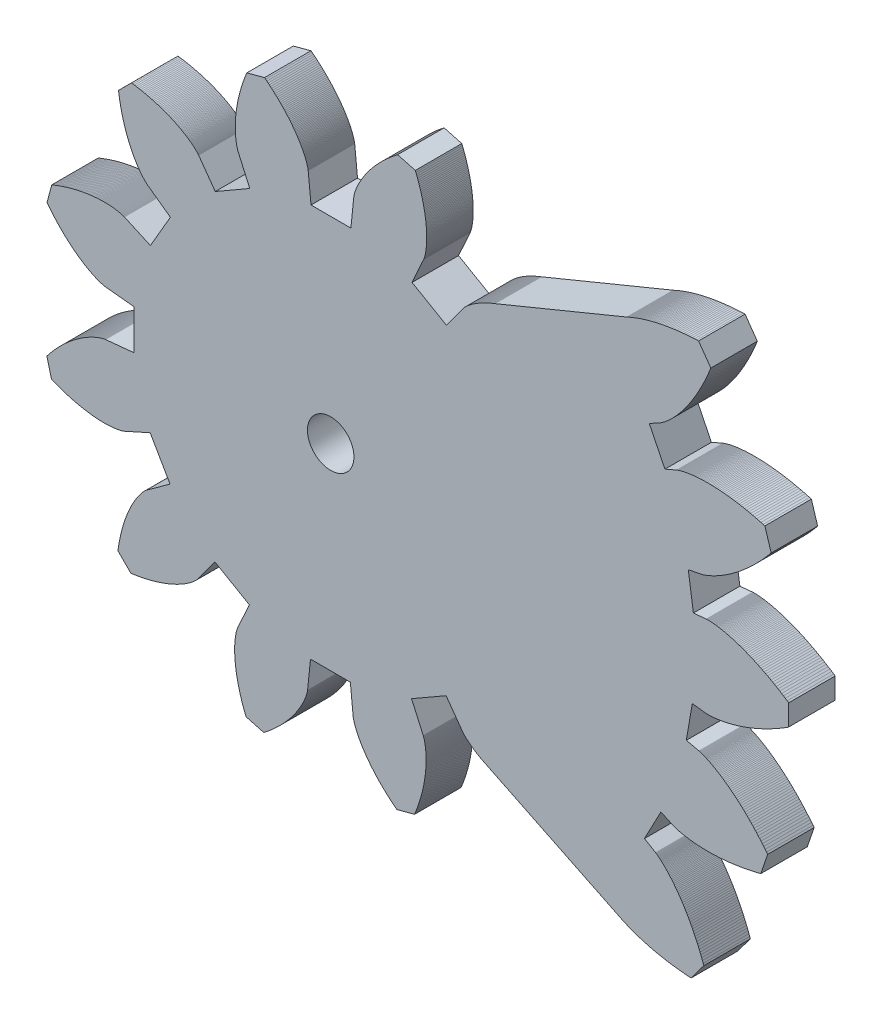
SolidWorks part; units mm, degrees
ref_plane "Front Plane" through (0, 0, 0) normal (0, 0, 1) x (1, 0, 0)
ref_plane "Top Plane" through (0, 0, 0) normal (0, 1, 0) x (1, 0, 0)
ref_plane "Right Plane" through (0, 0, 0) normal (1, 0, 0) x (0, 0, -1)
sketch "Sketch1" plane through (0, 0, 0) normal (0, 0, 1) x (1, 0, 0)
  line L0 (-25.397, -2.5368) -> (-29.0747, -2.9042)
  line L1 (-29.0747, -2.9042) -> (-29.0791, -2.9047)
  line L2 (-29.0791, -2.9047) -> (-29.0846, -2.9054)
  line L3 (-29.0846, -2.9054) -> (-29.0923, -2.9064)
  line L4 (-29.0923, -2.9064) -> (-29.1023, -2.9078)
  line L5 (-29.1023, -2.9078) -> (-29.1144, -2.9096)
  line L6 (-29.1144, -2.9096) -> (-29.1287, -2.9118)
  line L7 (-29.1287, -2.9118) -> (-29.1451, -2.9146)
  line L8 (-29.1451, -2.9146) -> (-29.1637, -2.9178)
  line L9 (-29.1637, -2.9178) -> (-29.1845, -2.9217)
  line L10 (-29.1845, -2.9217) -> (-29.2075, -2.9261)
  line L11 (-29.2075, -2.9261) -> (-29.2326, -2.9312)
  line L12 (-29.2326, -2.9312) -> (-29.2598, -2.9369)
  line L13 (-29.2598, -2.9369) -> (-29.2891, -2.9434)
  line L14 (-29.2891, -2.9434) -> (-29.3205, -2.9507)
  line L15 (-29.3205, -2.9507) -> (-29.3541, -2.9587)
  line L16 (-29.3541, -2.9587) -> (-29.3897, -2.9675)
  line L17 (-29.3897, -2.9675) -> (-29.4274, -2.9773)
  line L18 (-29.4274, -2.9773) -> (-29.4672, -2.9879)
  line L19 (-29.4672, -2.9879) -> (-29.509, -2.9995)
  line L20 (-29.509, -2.9995) -> (-29.5529, -3.012)
  line L21 (-29.5529, -3.012) -> (-29.5988, -3.0255)
  line L22 (-29.5988, -3.0255) -> (-29.6466, -3.0401)
  line L23 (-29.6466, -3.0401) -> (-29.6965, -3.0558)
  line L24 (-29.6965, -3.0558) -> (-29.7484, -3.0726)
  line L25 (-29.7484, -3.0726) -> (-29.8022, -3.0906)
  line L26 (-29.8022, -3.0906) -> (-29.858, -3.1098)
  line L27 (-29.858, -3.1098) -> (-29.9157, -3.1301)
  line L28 (-29.9157, -3.1301) -> (-29.9753, -3.1518)
  line L29 (-29.9753, -3.1518) -> (-30.0368, -3.1747)
  line L30 (-30.0368, -3.1747) -> (-30.1002, -3.199)
  line L31 (-30.1002, -3.199) -> (-30.1654, -3.2246)
  line L32 (-30.1654, -3.2246) -> (-30.2325, -3.2517)
  line L33 (-30.2325, -3.2517) -> (-30.3014, -3.2801)
  line L34 (-30.3014, -3.2801) -> (-30.3721, -3.3101)
  line L35 (-30.3721, -3.3101) -> (-30.4445, -3.3415)
  line L36 (-30.4445, -3.3415) -> (-30.5188, -3.3745)
  line L37 (-30.5188, -3.3745) -> (-30.5947, -3.4091)
  line L38 (-30.5947, -3.4091) -> (-30.6724, -3.4452)
  line L39 (-30.6724, -3.4452) -> (-30.7517, -3.483)
  line L40 (-30.7517, -3.483) -> (-30.8328, -3.5224)
  line L41 (-30.8328, -3.5224) -> (-30.9154, -3.5636)
  line L42 (-30.9154, -3.5636) -> (-30.9997, -3.6064)
  line L43 (-30.9997, -3.6064) -> (-31.0856, -3.6511)
  line L44 (-31.0856, -3.6511) -> (-31.1731, -3.6975)
  line L45 (-31.1731, -3.6975) -> (-31.2621, -3.7457)
  line L46 (-31.2621, -3.7457) -> (-31.3527, -3.7958)
  line L47 (-31.3527, -3.7958) -> (-31.4447, -3.8478)
  line L48 (-31.4447, -3.8478) -> (-31.5382, -3.9017)
  line L49 (-31.5382, -3.9017) -> (-31.6331, -3.9575)
  line L50 (-31.6331, -3.9575) -> (-31.7295, -4.0153)
  line L51 (-31.7295, -4.0153) -> (-31.8273, -4.0751)
  line L52 (-31.8273, -4.0751) -> (-31.9264, -4.1369)
  line L53 (-31.9264, -4.1369) -> (-32.0268, -4.2008)
  line L54 (-32.0268, -4.2008) -> (-32.1286, -4.2668)
  line L55 (-32.1286, -4.2668) -> (-32.2316, -4.3349)
  line L56 (-32.2316, -4.3349) -> (-32.3359, -4.4051)
  line L57 (-32.3359, -4.4051) -> (-32.4414, -4.4775)
  line L58 (-32.4414, -4.4775) -> (-32.5481, -4.552)
  line L59 (-32.5481, -4.552) -> (-32.656, -4.6288)
  line L60 (-32.656, -4.6288) -> (-32.7649, -4.7079)
  line L61 (-32.7649, -4.7079) -> (-32.875, -4.7892)
  line L62 (-32.875, -4.7892) -> (-32.9861, -4.8728)
  line L63 (-32.9861, -4.8728) -> (-33.0983, -4.9587)
  line L64 (-33.0983, -4.9587) -> (-33.2115, -5.047)
  line L65 (-33.2115, -5.047) -> (-33.3256, -5.1377)
  line L66 (-33.3256, -5.1377) -> (-33.4407, -5.2307)
  line L67 (-33.4407, -5.2307) -> (-33.5566, -5.3261)
  line L68 (-33.5566, -5.3261) -> (-33.6735, -5.424)
  line L69 (-33.6735, -5.424) -> (-33.7912, -5.5244)
  line L70 (-33.7912, -5.5244) -> (-33.9096, -5.6272)
  line L71 (-33.9096, -5.6272) -> (-34.0289, -5.7325)
  line L72 (-34.0289, -5.7325) -> (-34.1489, -5.8404)
  line L73 (-34.1489, -5.8404) -> (-34.2695, -5.9508)
  line L74 (-34.2695, -5.9508) -> (-34.3909, -6.0637)
  line L75 (-34.3909, -6.0637) -> (-34.5128, -6.1793)
  line L76 (-34.5128, -6.1793) -> (-34.6354, -6.2974)
  line L77 (-34.6354, -6.2974) -> (-34.7584, -6.4182)
  line L78 (-34.7584, -6.4182) -> (-34.8821, -6.5416)
  line L79 (-34.8821, -6.5416) -> (-35.0062, -6.6677)
  line L80 (-35.0062, -6.6677) -> (-35.1307, -6.7965)
  line L81 (-35.1307, -6.7965) -> (-35.2556, -6.9279)
  line L82 (-35.2556, -6.9279) -> (-35.3809, -7.0621)
  line L83 (-35.3809, -7.0621) -> (-35.5066, -7.199)
  line L84 (-35.5066, -7.199) -> (-35.6325, -7.3386)
  line L85 (-35.6325, -7.3386) -> (-35.7587, -7.481)
  line L86 (-35.7587, -7.481) -> (-35.8851, -7.6261)
  line L87 (-35.8851, -7.6261) -> (-36.0116, -7.7741)
  line L88 (-36.0116, -7.7741) -> (-36.1383, -7.9249)
  line L89 (-36.1383, -7.9249) -> (-36.2651, -8.0784)
  line L90 (-36.2651, -8.0784) -> (-36.392, -8.2348)
  line L91 (-36.392, -8.2348) -> (-36.5189, -8.3941)
  line L92 (-36.5189, -8.3941) -> (-36.6315, -8.538)
  line L93 (-36.6315, -8.538) -> (-36.0224, -10.8235)
  line L94 (-36.0224, -10.8235) -> (-35.8531, -10.8923)
  line L95 (-35.8531, -10.8923) -> (-35.6638, -10.9672)
  line L96 (-35.6638, -10.9672) -> (-35.476, -11.0398)
  line L97 (-35.476, -11.0398) -> (-35.2896, -11.1099)
  line L98 (-35.2896, -11.1099) -> (-35.1046, -11.1776)
  line L99 (-35.1046, -11.1776) -> (-34.9212, -11.2429)
  line L100 (-34.9212, -11.2429) -> (-34.7394, -11.306)
  line L101 (-34.7394, -11.306) -> (-34.5591, -11.3667)
  line L102 (-34.5591, -11.3667) -> (-34.3803, -11.4251)
  line L103 (-34.3803, -11.4251) -> (-34.2032, -11.4813)
  line L104 (-34.2032, -11.4813) -> (-34.0278, -11.5354)
  line L105 (-34.0278, -11.5354) -> (-33.854, -11.5872)
  line L106 (-33.854, -11.5872) -> (-33.6819, -11.6369)
  line L107 (-33.6819, -11.6369) -> (-33.5115, -11.6845)
  line L108 (-33.5115, -11.6845) -> (-33.3429, -11.73)
  line L109 (-33.3429, -11.73) -> (-33.176, -11.7735)
  line L110 (-33.176, -11.7735) -> (-33.0109, -11.815)
  line L111 (-33.0109, -11.815) -> (-32.8477, -11.8546)
  line L112 (-32.8477, -11.8546) -> (-32.6862, -11.8922)
  line L113 (-32.6862, -11.8922) -> (-32.5266, -11.9279)
  line L114 (-32.5266, -11.9279) -> (-32.3689, -11.9617)
  line L115 (-32.3689, -11.9617) -> (-32.213, -11.9938)
  line L116 (-32.213, -11.9938) -> (-32.0591, -12.024)
  line L117 (-32.0591, -12.024) -> (-31.9071, -12.0525)
  line L118 (-31.9071, -12.0525) -> (-31.757, -12.0792)
  line L119 (-31.757, -12.0792) -> (-31.6089, -12.1043)
  line L120 (-31.6089, -12.1043) -> (-31.4628, -12.1277)
  line L121 (-31.4628, -12.1277) -> (-31.3187, -12.1496)
  line L122 (-31.3187, -12.1496) -> (-31.1766, -12.1698)
  line L123 (-31.1766, -12.1698) -> (-31.0366, -12.1885)
  line L124 (-31.0366, -12.1885) -> (-30.8986, -12.2057)
  line L125 (-30.8986, -12.2057) -> (-30.7626, -12.2215)
  line L126 (-30.7626, -12.2215) -> (-30.6288, -12.2358)
  line L127 (-30.6288, -12.2358) -> (-30.497, -12.2488)
  line L128 (-30.497, -12.2488) -> (-30.3674, -12.2604)
  line L129 (-30.3674, -12.2604) -> (-30.2398, -12.2707)
  line L130 (-30.2398, -12.2707) -> (-30.1144, -12.2797)
  line L131 (-30.1144, -12.2797) -> (-29.9912, -12.2874)
  line L132 (-29.9912, -12.2874) -> (-29.8701, -12.294)
  line L133 (-29.8701, -12.294) -> (-29.7512, -12.2995)
  line L134 (-29.7512, -12.2995) -> (-29.6344, -12.3038)
  line L135 (-29.6344, -12.3038) -> (-29.5199, -12.307)
  line L136 (-29.5199, -12.307) -> (-29.4075, -12.3092)
  line L137 (-29.4075, -12.3092) -> (-29.2974, -12.3103)
  line L138 (-29.2974, -12.3103) -> (-29.1895, -12.3105)
  line L139 (-29.1895, -12.3105) -> (-29.0838, -12.3098)
  line L140 (-29.0838, -12.3098) -> (-28.9803, -12.3082)
  line L141 (-28.9803, -12.3082) -> (-28.8791, -12.3058)
  line L142 (-28.8791, -12.3058) -> (-28.7801, -12.3025)
  line L143 (-28.7801, -12.3025) -> (-28.6834, -12.2985)
  line L144 (-28.6834, -12.2985) -> (-28.589, -12.2937)
  line L145 (-28.589, -12.2937) -> (-28.4968, -12.2882)
  line L146 (-28.4968, -12.2882) -> (-28.4069, -12.2821)
  line L147 (-28.4069, -12.2821) -> (-28.3192, -12.2754)
  line L148 (-28.3192, -12.2754) -> (-28.2339, -12.2681)
  line L149 (-28.2339, -12.2681) -> (-28.1508, -12.2603)
  line L150 (-28.1508, -12.2603) -> (-28.07, -12.2519)
  line L151 (-28.07, -12.2519) -> (-27.9915, -12.2432)
  line L152 (-27.9915, -12.2432) -> (-27.9153, -12.2339)
  line L153 (-27.9153, -12.2339) -> (-27.8414, -12.2244)
  line L154 (-27.8414, -12.2244) -> (-27.7697, -12.2144)
  line L155 (-27.7697, -12.2144) -> (-27.7004, -12.2042)
  line L156 (-27.7004, -12.2042) -> (-27.6333, -12.1937)
  line L157 (-27.6333, -12.1937) -> (-27.5686, -12.183)
  line L158 (-27.5686, -12.183) -> (-27.5061, -12.1721)
  line L159 (-27.5061, -12.1721) -> (-27.4459, -12.1611)
  line L160 (-27.4459, -12.1611) -> (-27.388, -12.15)
  line L161 (-27.388, -12.15) -> (-27.3324, -12.1387)
  line L162 (-27.3324, -12.1387) -> (-27.279, -12.1275)
  line L163 (-27.279, -12.1275) -> (-27.228, -12.1163)
  line L164 (-27.228, -12.1163) -> (-27.1791, -12.1051)
  line L165 (-27.1791, -12.1051) -> (-27.1326, -12.0941)
  line L166 (-27.1326, -12.0941) -> (-27.0883, -12.0831)
  line L167 (-27.0883, -12.0831) -> (-27.0463, -12.0723)
  line L168 (-27.0463, -12.0723) -> (-27.0065, -12.0617)
  line L169 (-27.0065, -12.0617) -> (-26.969, -12.0514)
  line L170 (-26.969, -12.0514) -> (-26.9337, -12.0414)
  line L171 (-26.9337, -12.0414) -> (-26.9006, -12.0316)
  line L172 (-26.9006, -12.0316) -> (-26.8697, -12.0223)
  line L173 (-26.8697, -12.0223) -> (-26.841, -12.0133)
  line L174 (-26.841, -12.0133) -> (-26.8146, -12.0047)
  line L175 (-26.8146, -12.0047) -> (-26.7903, -11.9967)
  line L176 (-26.7903, -11.9967) -> (-26.7682, -11.9891)
  line L177 (-26.7682, -11.9891) -> (-26.7482, -11.9821)
  line L178 (-26.7482, -11.9821) -> (-26.7304, -11.9757)
  line L179 (-26.7304, -11.9757) -> (-26.7148, -11.9698)
  line L180 (-26.7148, -11.9698) -> (-26.7013, -11.9647)
  line L181 (-26.7013, -11.9647) -> (-26.6899, -11.9602)
  line L182 (-26.6899, -11.9602) -> (-26.6806, -11.9565)
  line L183 (-26.6806, -11.9565) -> (-26.6734, -11.9535)
  line L184 (-26.6734, -11.9535) -> (-26.6683, -11.9514)
  line L185 (-26.6683, -11.9514) -> (-26.6642, -11.9496)
  line L186 (-26.6642, -11.9496) -> (-23.2914, -10.4381)
  line L187 (-23.2914, -10.4381) -> (-20.726, -14.8954)
  line L188 (-20.726, -14.8954) -> (-23.7273, -17.0524)
  line L189 (-23.7273, -17.0524) -> (-23.7309, -17.0551)
  line L190 (-23.7309, -17.0551) -> (-23.7353, -17.0584)
  line L191 (-23.7353, -17.0584) -> (-23.7415, -17.0632)
  line L192 (-23.7415, -17.0632) -> (-23.7494, -17.0693)
  line L193 (-23.7494, -17.0693) -> (-23.759, -17.0769)
  line L194 (-23.759, -17.0769) -> (-23.7703, -17.086)
  line L195 (-23.7703, -17.086) -> (-23.7831, -17.0966)
  line L196 (-23.7831, -17.0966) -> (-23.7976, -17.1088)
  line L197 (-23.7976, -17.1088) -> (-23.8137, -17.1225)
  line L198 (-23.8137, -17.1225) -> (-23.8314, -17.1378)
  line L199 (-23.8314, -17.1378) -> (-23.8505, -17.1548)
  line L200 (-23.8505, -17.1548) -> (-23.8712, -17.1734)
  line L201 (-23.8712, -17.1734) -> (-23.8934, -17.1936)
  line L202 (-23.8934, -17.1936) -> (-23.917, -17.2156)
  line L203 (-23.917, -17.2156) -> (-23.942, -17.2393)
  line L204 (-23.942, -17.2393) -> (-23.9685, -17.2648)
  line L205 (-23.9685, -17.2648) -> (-23.9963, -17.2921)
  line L206 (-23.9963, -17.2921) -> (-24.0254, -17.3212)
  line L207 (-24.0254, -17.3212) -> (-24.0558, -17.3521)
  line L208 (-24.0558, -17.3521) -> (-24.0875, -17.3849)
  line L209 (-24.0875, -17.3849) -> (-24.1205, -17.4196)
  line L210 (-24.1205, -17.4196) -> (-24.1547, -17.4562)
  line L211 (-24.1547, -17.4562) -> (-24.19, -17.4947)
  line L212 (-24.19, -17.4947) -> (-24.2265, -17.5352)
  line L213 (-24.2265, -17.5352) -> (-24.2642, -17.5776)
  line L214 (-24.2642, -17.5776) -> (-24.3029, -17.6221)
  line L215 (-24.3029, -17.6221) -> (-24.3427, -17.6686)
  line L216 (-24.3427, -17.6686) -> (-24.3835, -17.7172)
  line L217 (-24.3835, -17.7172) -> (-24.4253, -17.7678)
  line L218 (-24.4253, -17.7678) -> (-24.468, -17.8205)
  line L219 (-24.468, -17.8205) -> (-24.5117, -17.8753)
  line L220 (-24.5117, -17.8753) -> (-24.5563, -17.9323)
  line L221 (-24.5563, -17.9323) -> (-24.6017, -17.9914)
  line L222 (-24.6017, -17.9914) -> (-24.6479, -18.0527)
  line L223 (-24.6479, -18.0527) -> (-24.695, -18.1161)
  line L224 (-24.695, -18.1161) -> (-24.7428, -18.1818)
  line L225 (-24.7428, -18.1818) -> (-24.7913, -18.2497)
  line L226 (-24.7913, -18.2497) -> (-24.8405, -18.3198)
  line L227 (-24.8405, -18.3198) -> (-24.8903, -18.3922)
  line L228 (-24.8903, -18.3922) -> (-24.9408, -18.4669)
  line L229 (-24.9408, -18.4669) -> (-24.9918, -18.5439)
  line L230 (-24.9918, -18.5439) -> (-25.0434, -18.6231)
  line L231 (-25.0434, -18.6231) -> (-25.0954, -18.7047)
  line L232 (-25.0954, -18.7047) -> (-25.148, -18.7887)
  line L233 (-25.148, -18.7887) -> (-25.2009, -18.8749)
  line L234 (-25.2009, -18.8749) -> (-25.2543, -18.9636)
  line L235 (-25.2543, -18.9636) -> (-25.308, -19.0546)
  line L236 (-25.308, -19.0546) -> (-25.362, -19.148)
  line L237 (-25.362, -19.148) -> (-25.4164, -19.2439)
  line L238 (-25.4164, -19.2439) -> (-25.4709, -19.3421)
  line L239 (-25.4709, -19.3421) -> (-25.5257, -19.4428)
  line L240 (-25.5257, -19.4428) -> (-25.5806, -19.5459)
  line L241 (-25.5806, -19.5459) -> (-25.6356, -19.6514)
  line L242 (-25.6356, -19.6514) -> (-25.6908, -19.7594)
  line L243 (-25.6908, -19.7594) -> (-25.746, -19.8699)
  line L244 (-25.746, -19.8699) -> (-25.8012, -19.9829)
  line L245 (-25.8012, -19.9829) -> (-25.8564, -20.0983)
  line L246 (-25.8564, -20.0983) -> (-25.9115, -20.2162)
  line L247 (-25.9115, -20.2162) -> (-25.9665, -20.3367)
  line L248 (-25.9665, -20.3367) -> (-26.0213, -20.4596)
  line L249 (-26.0213, -20.4596) -> (-26.076, -20.5851)
  line L250 (-26.076, -20.5851) -> (-26.1304, -20.713)
  line L251 (-26.1304, -20.713) -> (-26.1846, -20.8435)
  line L252 (-26.1846, -20.8435) -> (-26.2385, -20.9766)
  line L253 (-26.2385, -20.9766) -> (-26.292, -21.1121)
  line L254 (-26.292, -21.1121) -> (-26.3451, -21.2502)
  line L255 (-26.3451, -21.2502) -> (-26.3978, -21.3909)
  line L256 (-26.3978, -21.3909) -> (-26.4501, -21.5341)
  line L257 (-26.4501, -21.5341) -> (-26.5018, -21.6798)
  line L258 (-26.5018, -21.6798) -> (-26.553, -21.8281)
  line L259 (-26.553, -21.8281) -> (-26.6036, -21.9789)
  line L260 (-26.6036, -21.9789) -> (-26.6536, -22.1323)
  line L261 (-26.6536, -22.1323) -> (-26.7029, -22.2883)
  line L262 (-26.7029, -22.2883) -> (-26.7515, -22.4468)
  line L263 (-26.7515, -22.4468) -> (-26.7993, -22.6078)
  line L264 (-26.7993, -22.6078) -> (-26.8464, -22.7714)
  line L265 (-26.8464, -22.7714) -> (-26.8926, -22.9376)
  line L266 (-26.8926, -22.9376) -> (-26.9379, -23.1062)
  line L267 (-26.9379, -23.1062) -> (-26.9824, -23.2775)
  line L268 (-26.9824, -23.2775) -> (-27.0258, -23.4512)
  line L269 (-27.0258, -23.4512) -> (-27.0683, -23.6276)
  line L270 (-27.0683, -23.6276) -> (-27.1098, -23.8064)
  line L271 (-27.1098, -23.8064) -> (-27.1501, -23.9878)
  line L272 (-27.1501, -23.9878) -> (-27.1893, -24.1716)
  line L273 (-27.1893, -24.1716) -> (-27.2274, -24.3581)
  line L274 (-27.2274, -24.3581) -> (-27.2643, -24.547)
  line L275 (-27.2643, -24.547) -> (-27.2999, -24.7384)
  line L276 (-27.2999, -24.7384) -> (-27.3343, -24.9323)
  line L277 (-27.3343, -24.9323) -> (-27.3673, -25.1287)
  line L278 (-27.3673, -25.1287) -> (-27.399, -25.3276)
  line L279 (-27.399, -25.3276) -> (-27.4292, -25.5289)
  line L280 (-27.4292, -25.5289) -> (-27.4548, -25.7099)
  line L281 (-27.4548, -25.7099) -> (-25.7846, -27.3846)
  line L282 (-25.7846, -27.3846) -> (-25.6036, -27.3595)
  line L283 (-25.6036, -27.3595) -> (-25.4022, -27.3298)
  line L284 (-25.4022, -27.3298) -> (-25.2032, -27.2987)
  line L285 (-25.2032, -27.2987) -> (-25.0067, -27.2662)
  line L286 (-25.0067, -27.2662) -> (-24.8127, -27.2324)
  line L287 (-24.8127, -27.2324) -> (-24.6212, -27.1973)
  line L288 (-24.6212, -27.1973) -> (-24.4322, -27.1609)
  line L289 (-24.4322, -27.1609) -> (-24.2457, -27.1234)
  line L290 (-24.2457, -27.1234) -> (-24.0617, -27.0846)
  line L291 (-24.0617, -27.0846) -> (-23.8802, -27.0448)
  line L292 (-23.8802, -27.0448) -> (-23.7013, -27.0038)
  line L293 (-23.7013, -27.0038) -> (-23.5248, -26.9618)
  line L294 (-23.5248, -26.9618) -> (-23.3509, -26.9188)
  line L295 (-23.3509, -26.9188) -> (-23.1796, -26.8749)
  line L296 (-23.1796, -26.8749) -> (-23.0108, -26.83)
  line L297 (-23.0108, -26.83) -> (-22.8445, -26.7842)
  line L298 (-22.8445, -26.7842) -> (-22.6808, -26.7376)
  line L299 (-22.6808, -26.7376) -> (-22.5196, -26.6902)
  line L300 (-22.5196, -26.6902) -> (-22.361, -26.642)
  line L301 (-22.361, -26.642) -> (-22.2049, -26.5932)
  line L302 (-22.2049, -26.5932) -> (-22.0514, -26.5436)
  line L303 (-22.0514, -26.5436) -> (-21.9004, -26.4934)
  line L304 (-21.9004, -26.4934) -> (-21.752, -26.4426)
  line L305 (-21.752, -26.4426) -> (-21.6061, -26.3913)
  line L306 (-21.6061, -26.3913) -> (-21.4628, -26.3394)
  line L307 (-21.4628, -26.3394) -> (-21.322, -26.2871)
  line L308 (-21.322, -26.2871) -> (-21.1837, -26.2343)
  line L309 (-21.1837, -26.2343) -> (-21.048, -26.1812)
  line L310 (-21.048, -26.1812) -> (-20.9148, -26.1277)
  line L311 (-20.9148, -26.1277) -> (-20.7842, -26.0739)
  line L312 (-20.7842, -26.0739) -> (-20.6561, -26.0198)
  line L313 (-20.6561, -26.0198) -> (-20.5305, -25.9654)
  line L314 (-20.5305, -25.9654) -> (-20.4074, -25.9109)
  line L315 (-20.4074, -25.9109) -> (-20.2868, -25.8563)
  line L316 (-20.2868, -25.8563) -> (-20.1687, -25.8015)
  line L317 (-20.1687, -25.8015) -> (-20.0531, -25.7466)
  line L318 (-20.0531, -25.7466) -> (-19.94, -25.6917)
  line L319 (-19.94, -25.6917) -> (-19.8294, -25.6368)
  line L320 (-19.8294, -25.6368) -> (-19.7212, -25.582)
  line L321 (-19.7212, -25.582) -> (-19.6155, -25.5272)
  line L322 (-19.6155, -25.5272) -> (-19.5123, -25.4726)
  line L323 (-19.5123, -25.4726) -> (-19.4115, -25.4181)
  line L324 (-19.4115, -25.4181) -> (-19.3131, -25.3638)
  line L325 (-19.3131, -25.3638) -> (-19.2171, -25.3097)
  line L326 (-19.2171, -25.3097) -> (-19.1235, -25.256)
  line L327 (-19.1235, -25.256) -> (-19.0324, -25.2025)
  line L328 (-19.0324, -25.2025) -> (-18.9436, -25.1494)
  line L329 (-18.9436, -25.1494) -> (-18.8571, -25.0967)
  line L330 (-18.8571, -25.0967) -> (-18.7731, -25.0443)
  line L331 (-18.7731, -25.0443) -> (-18.6913, -24.9925)
  line L332 (-18.6913, -24.9925) -> (-18.6119, -24.9411)
  line L333 (-18.6119, -24.9411) -> (-18.5348, -24.8903)
  line L334 (-18.5348, -24.8903) -> (-18.46, -24.8401)
  line L335 (-18.46, -24.8401) -> (-18.3875, -24.7904)
  line L336 (-18.3875, -24.7904) -> (-18.3172, -24.7414)
  line L337 (-18.3172, -24.7414) -> (-18.2492, -24.6931)
  line L338 (-18.2492, -24.6931) -> (-18.1834, -24.6455)
  line L339 (-18.1834, -24.6455) -> (-18.1198, -24.5986)
  line L340 (-18.1198, -24.5986) -> (-18.0584, -24.5525)
  line L341 (-18.0584, -24.5525) -> (-17.9991, -24.5073)
  line L342 (-17.9991, -24.5073) -> (-17.9421, -24.4629)
  line L343 (-17.9421, -24.4629) -> (-17.8871, -24.4193)
  line L344 (-17.8871, -24.4193) -> (-17.8343, -24.3767)
  line L345 (-17.8343, -24.3767) -> (-17.7836, -24.3351)
  line L346 (-17.7836, -24.3351) -> (-17.7349, -24.2944)
  line L347 (-17.7349, -24.2944) -> (-17.6883, -24.2548)
  line L348 (-17.6883, -24.2548) -> (-17.6437, -24.2162)
  line L349 (-17.6437, -24.2162) -> (-17.6012, -24.1787)
  line L350 (-17.6012, -24.1787) -> (-17.5606, -24.1423)
  line L351 (-17.5606, -24.1423) -> (-17.522, -24.107)
  line L352 (-17.522, -24.107) -> (-17.4853, -24.0729)
  line L353 (-17.4853, -24.0729) -> (-17.4505, -24.0401)
  line L354 (-17.4505, -24.0401) -> (-17.4176, -24.0084)
  line L355 (-17.4176, -24.0084) -> (-17.3866, -23.9781)
  line L356 (-17.3866, -23.9781) -> (-17.3574, -23.949)
  line L357 (-17.3574, -23.949) -> (-17.3301, -23.9213)
  line L358 (-17.3301, -23.9213) -> (-17.3045, -23.895)
  line L359 (-17.3045, -23.895) -> (-17.2808, -23.87)
  line L360 (-17.2808, -23.87) -> (-17.2587, -23.8464)
  line L361 (-17.2587, -23.8464) -> (-17.2384, -23.8243)
  line L362 (-17.2384, -23.8243) -> (-17.2197, -23.8037)
  line L363 (-17.2197, -23.8037) -> (-17.2027, -23.7846)
  line L364 (-17.2027, -23.7846) -> (-17.1874, -23.767)
  line L365 (-17.1874, -23.767) -> (-17.1736, -23.7509)
  line L366 (-17.1736, -23.7509) -> (-17.1614, -23.7364)
  line L367 (-17.1614, -23.7364) -> (-17.1508, -23.7236)
  line L368 (-17.1508, -23.7236) -> (-17.1416, -23.7124)
  line L369 (-17.1416, -23.7124) -> (-17.134, -23.7028)
  line L370 (-17.134, -23.7028) -> (-17.1278, -23.6949)
  line L371 (-17.1278, -23.6949) -> (-17.1231, -23.6888)
  line L372 (-17.1231, -23.6888) -> (-17.1197, -23.6843)
  line L373 (-17.1197, -23.6843) -> (-17.1171, -23.6807)
  line L374 (-17.1171, -23.6807) -> (-14.9519, -20.6853)
  line L375 (-14.9519, -20.6853) -> (-10.5015, -23.2628)
  line L376 (-10.5015, -23.2628) -> (-12.0222, -26.6315)
  line L377 (-12.0222, -26.6315) -> (-12.024, -26.6356)
  line L378 (-12.024, -26.6356) -> (-12.0262, -26.6407)
  line L379 (-12.0262, -26.6407) -> (-12.0292, -26.6479)
  line L380 (-12.0292, -26.6479) -> (-12.0329, -26.6572)
  line L381 (-12.0329, -26.6572) -> (-12.0374, -26.6686)
  line L382 (-12.0374, -26.6686) -> (-12.0426, -26.6821)
  line L383 (-12.0426, -26.6821) -> (-12.0485, -26.6977)
  line L384 (-12.0485, -26.6977) -> (-12.055, -26.7155)
  line L385 (-12.055, -26.7155) -> (-12.062, -26.7354)
  line L386 (-12.062, -26.7354) -> (-12.0697, -26.7575)
  line L387 (-12.0697, -26.7575) -> (-12.0778, -26.7817)
  line L388 (-12.0778, -26.7817) -> (-12.0864, -26.8082)
  line L389 (-12.0864, -26.8082) -> (-12.0955, -26.8368)
  line L390 (-12.0955, -26.8368) -> (-12.1049, -26.8677)
  line L391 (-12.1049, -26.8677) -> (-12.1147, -26.9007)
  line L392 (-12.1147, -26.9007) -> (-12.1249, -26.936)
  line L393 (-12.1249, -26.936) -> (-12.1353, -26.9735)
  line L394 (-12.1353, -26.9735) -> (-12.146, -27.0133)
  line L395 (-12.146, -27.0133) -> (-12.1569, -27.0553)
  line L396 (-12.1569, -27.0553) -> (-12.168, -27.0995)
  line L397 (-12.168, -27.0995) -> (-12.1792, -27.146)
  line L398 (-12.1792, -27.146) -> (-12.1905, -27.1948)
  line L399 (-12.1905, -27.1948) -> (-12.2018, -27.2459)
  line L400 (-12.2018, -27.2459) -> (-12.2132, -27.2992)
  line L401 (-12.2132, -27.2992) -> (-12.2246, -27.3548)
  line L402 (-12.2246, -27.3548) -> (-12.2359, -27.4127)
  line L403 (-12.2359, -27.4127) -> (-12.2471, -27.4728)
  line L404 (-12.2471, -27.4728) -> (-12.2581, -27.5353)
  line L405 (-12.2581, -27.5353) -> (-12.269, -27.6)
  line L406 (-12.269, -27.6) -> (-12.2797, -27.667)
  line L407 (-12.2797, -27.667) -> (-12.2901, -27.7363)
  line L408 (-12.2901, -27.7363) -> (-12.3002, -27.8079)
  line L409 (-12.3002, -27.8079) -> (-12.31, -27.8818)
  line L410 (-12.31, -27.8818) -> (-12.3194, -27.958)
  line L411 (-12.3194, -27.958) -> (-12.3284, -28.0365)
  line L412 (-12.3284, -28.0365) -> (-12.337, -28.1173)
  line L413 (-12.337, -28.1173) -> (-12.345, -28.2003)
  line L414 (-12.345, -28.2003) -> (-12.3526, -28.2857)
  line L415 (-12.3526, -28.2857) -> (-12.3595, -28.3733)
  line L416 (-12.3595, -28.3733) -> (-12.3659, -28.4632)
  line L417 (-12.3659, -28.4632) -> (-12.3716, -28.5553)
  line L418 (-12.3716, -28.5553) -> (-12.3766, -28.6498)
  line L419 (-12.3766, -28.6498) -> (-12.3809, -28.7465)
  line L420 (-12.3809, -28.7465) -> (-12.3844, -28.8454)
  line L421 (-12.3844, -28.8454) -> (-12.3872, -28.9466)
  line L422 (-12.3872, -28.9466) -> (-12.3891, -29.0501)
  line L423 (-12.3891, -29.0501) -> (-12.3901, -29.1558)
  line L424 (-12.3901, -29.1558) -> (-12.3902, -29.2637)
  line L425 (-12.3902, -29.2637) -> (-12.3893, -29.3739)
  line L426 (-12.3893, -29.3739) -> (-12.3874, -29.4862)
  line L427 (-12.3874, -29.4862) -> (-12.3845, -29.6008)
  line L428 (-12.3845, -29.6008) -> (-12.3805, -29.7175)
  line L429 (-12.3805, -29.7175) -> (-12.3754, -29.8365)
  line L430 (-12.3754, -29.8365) -> (-12.3692, -29.9576)
  line L431 (-12.3692, -29.9576) -> (-12.3617, -30.0808)
  line L432 (-12.3617, -30.0808) -> (-12.353, -30.2063)
  line L433 (-12.353, -30.2063) -> (-12.3431, -30.3338)
  line L434 (-12.3431, -30.3338) -> (-12.3319, -30.4635)
  line L435 (-12.3319, -30.4635) -> (-12.3193, -30.5953)
  line L436 (-12.3193, -30.5953) -> (-12.3053, -30.7292)
  line L437 (-12.3053, -30.7292) -> (-12.2899, -30.8652)
  line L438 (-12.2899, -30.8652) -> (-12.2731, -31.0032)
  line L439 (-12.2731, -31.0032) -> (-12.2548, -31.1433)
  line L440 (-12.2548, -31.1433) -> (-12.2349, -31.2855)
  line L441 (-12.2349, -31.2855) -> (-12.2135, -31.4297)
  line L442 (-12.2135, -31.4297) -> (-12.1904, -31.5758)
  line L443 (-12.1904, -31.5758) -> (-12.1658, -31.724)
  line L444 (-12.1658, -31.724) -> (-12.1394, -31.8741)
  line L445 (-12.1394, -31.8741) -> (-12.1113, -32.0262)
  line L446 (-12.1113, -32.0262) -> (-12.0815, -32.1802)
  line L447 (-12.0815, -32.1802) -> (-12.0499, -32.3361)
  line L448 (-12.0499, -32.3361) -> (-12.0165, -32.494)
  line L449 (-12.0165, -32.494) -> (-11.9812, -32.6537)
  line L450 (-11.9812, -32.6537) -> (-11.9441, -32.8152)
  line L451 (-11.9441, -32.8152) -> (-11.905, -32.9786)
  line L452 (-11.905, -32.9786) -> (-11.8639, -33.1438)
  line L453 (-11.8639, -33.1438) -> (-11.8209, -33.3108)
  line L454 (-11.8209, -33.3108) -> (-11.7758, -33.4796)
  line L455 (-11.7758, -33.4796) -> (-11.7287, -33.6501)
  line L456 (-11.7287, -33.6501) -> (-11.6794, -33.8223)
  line L457 (-11.6794, -33.8223) -> (-11.6281, -33.9962)
  line L458 (-11.6281, -33.9962) -> (-11.5745, -34.1718)
  line L459 (-11.5745, -34.1718) -> (-11.5188, -34.3491)
  line L460 (-11.5188, -34.3491) -> (-11.4608, -34.5279)
  line L461 (-11.4608, -34.5279) -> (-11.4006, -34.7084)
  line L462 (-11.4006, -34.7084) -> (-11.3381, -34.8904)
  line L463 (-11.3381, -34.8904) -> (-11.2732, -35.074)
  line L464 (-11.2732, -35.074) -> (-11.206, -35.2591)
  line L465 (-11.206, -35.2591) -> (-11.1364, -35.4457)
  line L466 (-11.1364, -35.4457) -> (-11.0644, -35.6338)
  line L467 (-11.0644, -35.6338) -> (-10.99, -35.8233)
  line L468 (-10.99, -35.8233) -> (-10.9216, -35.9928)
  line L469 (-10.9216, -35.9928) -> (-8.6378, -36.6081)
  line L470 (-8.6378, -36.6081) -> (-8.4936, -36.4958)
  line L471 (-8.4936, -36.4958) -> (-8.334, -36.3694)
  line L472 (-8.334, -36.3694) -> (-8.1773, -36.243)
  line L473 (-8.1773, -36.243) -> (-8.0233, -36.1166)
  line L474 (-8.0233, -36.1166) -> (-7.8722, -35.9903)
  line L475 (-7.8722, -35.9903) -> (-7.7239, -35.8641)
  line L476 (-7.7239, -35.8641) -> (-7.5784, -35.7381)
  line L477 (-7.5784, -35.7381) -> (-7.4357, -35.6124)
  line L478 (-7.4357, -35.6124) -> (-7.2957, -35.4868)
  line L479 (-7.2957, -35.4868) -> (-7.1585, -35.3615)
  line L480 (-7.1585, -35.3615) -> (-7.024, -35.2366)
  line L481 (-7.024, -35.2366) -> (-6.8922, -35.112)
  line L482 (-6.8922, -35.112) -> (-6.7631, -34.9879)
  line L483 (-6.7631, -34.9879) -> (-6.6367, -34.8641)
  line L484 (-6.6367, -34.8641) -> (-6.5129, -34.7408)
  line L485 (-6.5129, -34.7408) -> (-6.3918, -34.6181)
  line L486 (-6.3918, -34.6181) -> (-6.2733, -34.4958)
  line L487 (-6.2733, -34.4958) -> (-6.1575, -34.3742)
  line L488 (-6.1575, -34.3742) -> (-6.0442, -34.2532)
  line L489 (-6.0442, -34.2532) -> (-5.9334, -34.1328)
  line L490 (-5.9334, -34.1328) -> (-5.8253, -34.0131)
  line L491 (-5.8253, -34.0131) -> (-5.7196, -33.8942)
  line L492 (-5.7196, -33.8942) -> (-5.6165, -33.776)
  line L493 (-5.6165, -33.776) -> (-5.5158, -33.6586)
  line L494 (-5.5158, -33.6586) -> (-5.4176, -33.542)
  line L495 (-5.4176, -33.542) -> (-5.3218, -33.4263)
  line L496 (-5.3218, -33.4263) -> (-5.2285, -33.3115)
  line L497 (-5.2285, -33.3115) -> (-5.1375, -33.1976)
  line L498 (-5.1375, -33.1976) -> (-5.049, -33.0847)
  line L499 (-5.049, -33.0847) -> (-4.9627, -32.9727)
  line L500 (-4.9627, -32.9727) -> (-4.8788, -32.8618)
  line L501 (-4.8788, -32.8618) -> (-4.7972, -32.752)
  line L502 (-4.7972, -32.752) -> (-4.7179, -32.6432)
  line L503 (-4.7179, -32.6432) -> (-4.6408, -32.5356)
  line L504 (-4.6408, -32.5356) -> (-4.5659, -32.4291)
  line L505 (-4.5659, -32.4291) -> (-4.4932, -32.3238)
  line L506 (-4.4932, -32.3238) -> (-4.4227, -32.2197)
  line L507 (-4.4227, -32.2197) -> (-4.3543, -32.1168)
  line L508 (-4.3543, -32.1168) -> (-4.2881, -32.0153)
  line L509 (-4.2881, -32.0153) -> (-4.2239, -31.915)
  line L510 (-4.2239, -31.915) -> (-4.1618, -31.816)
  line L511 (-4.1618, -31.816) -> (-4.1018, -31.7184)
  line L512 (-4.1018, -31.7184) -> (-4.0437, -31.6222)
  line L513 (-4.0437, -31.6222) -> (-3.9876, -31.5274)
  line L514 (-3.9876, -31.5274) -> (-3.9335, -31.4341)
  line L515 (-3.9335, -31.4341) -> (-3.8813, -31.3422)
  line L516 (-3.8813, -31.3422) -> (-3.8309, -31.2518)
  line L517 (-3.8309, -31.2518) -> (-3.7824, -31.1629)
  line L518 (-3.7824, -31.1629) -> (-3.7358, -31.0756)
  line L519 (-3.7358, -31.0756) -> (-3.6909, -30.9898)
  line L520 (-3.6909, -30.9898) -> (-3.6478, -30.9056)
  line L521 (-3.6478, -30.9056) -> (-3.6065, -30.8231)
  line L522 (-3.6065, -30.8231) -> (-3.5668, -30.7421)
  line L523 (-3.5668, -30.7421) -> (-3.5288, -30.6629)
  line L524 (-3.5288, -30.6629) -> (-3.4924, -30.5853)
  line L525 (-3.4924, -30.5853) -> (-3.4577, -30.5094)
  line L526 (-3.4577, -30.5094) -> (-3.4245, -30.4353)
  line L527 (-3.4245, -30.4353) -> (-3.3929, -30.3629)
  line L528 (-3.3929, -30.3629) -> (-3.3627, -30.2923)
  line L529 (-3.3627, -30.2923) -> (-3.3341, -30.2235)
  line L530 (-3.3341, -30.2235) -> (-3.3069, -30.1565)
  line L531 (-3.3069, -30.1565) -> (-3.281, -30.0913)
  line L532 (-3.281, -30.0913) -> (-3.2566, -30.028)
  line L533 (-3.2566, -30.028) -> (-3.2335, -29.9666)
  line L534 (-3.2335, -29.9666) -> (-3.2117, -29.907)
  line L535 (-3.2117, -29.907) -> (-3.1911, -29.8494)
  line L536 (-3.1911, -29.8494) -> (-3.1718, -29.7937)
  line L537 (-3.1718, -29.7937) -> (-3.1537, -29.7399)
  line L538 (-3.1537, -29.7399) -> (-3.1368, -29.6881)
  line L539 (-3.1368, -29.6881) -> (-3.121, -29.6382)
  line L540 (-3.121, -29.6382) -> (-3.1062, -29.5904)
  line L541 (-3.1062, -29.5904) -> (-3.0925, -29.5446)
  line L542 (-3.0925, -29.5446) -> (-3.0799, -29.5007)
  line L543 (-3.0799, -29.5007) -> (-3.0682, -29.4589)
  line L544 (-3.0682, -29.4589) -> (-3.0575, -29.4192)
  line L545 (-3.0575, -29.4192) -> (-3.0477, -29.3815)
  line L546 (-3.0477, -29.3815) -> (-3.0387, -29.3459)
  line L547 (-3.0387, -29.3459) -> (-3.0306, -29.3124)
  line L548 (-3.0306, -29.3124) -> (-3.0233, -29.281)
  line L549 (-3.0233, -29.281) -> (-3.0167, -29.2517)
  line L550 (-3.0167, -29.2517) -> (-3.0109, -29.2245)
  line L551 (-3.0109, -29.2245) -> (-3.0057, -29.1994)
  line L552 (-3.0057, -29.1994) -> (-3.0012, -29.1765)
  line L553 (-3.0012, -29.1765) -> (-2.9973, -29.1557)
  line L554 (-2.9973, -29.1557) -> (-2.994, -29.1371)
  line L555 (-2.994, -29.1371) -> (-2.9912, -29.1206)
  line L556 (-2.9912, -29.1206) -> (-2.9889, -29.1063)
  line L557 (-2.9889, -29.1063) -> (-2.9871, -29.0942)
  line L558 (-2.9871, -29.0942) -> (-2.9857, -29.0843)
  line L559 (-2.9857, -29.0843) -> (-2.9846, -29.0766)
  line L560 (-2.9846, -29.0766) -> (-2.9839, -29.0711)
  line L561 (-2.9839, -29.0711) -> (-2.9834, -29.0667)
  line L562 (-2.9834, -29.0667) -> (-2.6061, -25.3899)
  line L563 (-2.6061, -25.3899) -> (2.5368, -25.397)
  line L564 (2.5368, -25.397) -> (2.9042, -29.0747)
  line L565 (2.9042, -29.0747) -> (2.9047, -29.0791)
  line L566 (2.9047, -29.0791) -> (2.9054, -29.0846)
  line L567 (2.9054, -29.0846) -> (2.9064, -29.0923)
  line L568 (2.9064, -29.0923) -> (2.9078, -29.1023)
  line L569 (2.9078, -29.1023) -> (2.9096, -29.1144)
  line L570 (2.9096, -29.1144) -> (2.9118, -29.1287)
  line L571 (2.9118, -29.1287) -> (2.9146, -29.1451)
  line L572 (2.9146, -29.1451) -> (2.9178, -29.1637)
  line L573 (2.9178, -29.1637) -> (2.9217, -29.1845)
  line L574 (2.9217, -29.1845) -> (2.9261, -29.2075)
  line L575 (2.9261, -29.2075) -> (2.9312, -29.2326)
  line L576 (2.9312, -29.2326) -> (2.9369, -29.2598)
  line L577 (2.9369, -29.2598) -> (2.9434, -29.2891)
  line L578 (2.9434, -29.2891) -> (2.9507, -29.3205)
  line L579 (2.9507, -29.3205) -> (2.9587, -29.3541)
  line L580 (2.9587, -29.3541) -> (2.9675, -29.3897)
  line L581 (2.9675, -29.3897) -> (2.9773, -29.4274)
  line L582 (2.9773, -29.4274) -> (2.9879, -29.4672)
  line L583 (2.9879, -29.4672) -> (2.9995, -29.509)
  line L584 (2.9995, -29.509) -> (3.012, -29.5529)
  line L585 (3.012, -29.5529) -> (3.0255, -29.5988)
  line L586 (3.0255, -29.5988) -> (3.0401, -29.6466)
  line L587 (3.0401, -29.6466) -> (3.0558, -29.6965)
  line L588 (3.0558, -29.6965) -> (3.0726, -29.7484)
  line L589 (3.0726, -29.7484) -> (3.0906, -29.8022)
  line L590 (3.0906, -29.8022) -> (3.1098, -29.858)
  line L591 (3.1098, -29.858) -> (3.1301, -29.9157)
  line L592 (3.1301, -29.9157) -> (3.1518, -29.9753)
  line L593 (3.1518, -29.9753) -> (3.1747, -30.0368)
  line L594 (3.1747, -30.0368) -> (3.199, -30.1002)
  line L595 (3.199, -30.1002) -> (3.2246, -30.1654)
  line L596 (3.2246, -30.1654) -> (3.2517, -30.2325)
  line L597 (3.2517, -30.2325) -> (3.2801, -30.3014)
  line L598 (3.2801, -30.3014) -> (3.3101, -30.3721)
  line L599 (3.3101, -30.3721) -> (3.3415, -30.4445)
  line L600 (3.3415, -30.4445) -> (3.3745, -30.5188)
  line L601 (3.3745, -30.5188) -> (3.4091, -30.5947)
  line L602 (3.4091, -30.5947) -> (3.4452, -30.6724)
  line L603 (3.4452, -30.6724) -> (3.483, -30.7517)
  line L604 (3.483, -30.7517) -> (3.5224, -30.8328)
  line L605 (3.5224, -30.8328) -> (3.5636, -30.9154)
  line L606 (3.5636, -30.9154) -> (3.6064, -30.9997)
  line L607 (3.6064, -30.9997) -> (3.6511, -31.0856)
  line L608 (3.6511, -31.0856) -> (3.6975, -31.1731)
  line L609 (3.6975, -31.1731) -> (3.7457, -31.2621)
  line L610 (3.7457, -31.2621) -> (3.7958, -31.3527)
  line L611 (3.7958, -31.3527) -> (3.8478, -31.4447)
  line L612 (3.8478, -31.4447) -> (3.9017, -31.5382)
  line L613 (3.9017, -31.5382) -> (3.9575, -31.6331)
  line L614 (3.9575, -31.6331) -> (4.0153, -31.7295)
  line L615 (4.0153, -31.7295) -> (4.0751, -31.8273)
  line L616 (4.0751, -31.8273) -> (4.1369, -31.9264)
  line L617 (4.1369, -31.9264) -> (4.2008, -32.0268)
  line L618 (4.2008, -32.0268) -> (4.2668, -32.1286)
  line L619 (4.2668, -32.1286) -> (4.3349, -32.2316)
  line L620 (4.3349, -32.2316) -> (4.4051, -32.3359)
  line L621 (4.4051, -32.3359) -> (4.4775, -32.4414)
  line L622 (4.4775, -32.4414) -> (4.552, -32.5481)
  line L623 (4.552, -32.5481) -> (4.6288, -32.656)
  line L624 (4.6288, -32.656) -> (4.7079, -32.7649)
  line L625 (4.7079, -32.7649) -> (4.7892, -32.875)
  line L626 (4.7892, -32.875) -> (4.8728, -32.9861)
  line L627 (4.8728, -32.9861) -> (4.9587, -33.0983)
  line L628 (4.9587, -33.0983) -> (5.047, -33.2115)
  line L629 (5.047, -33.2115) -> (5.1377, -33.3256)
  line L630 (5.1377, -33.3256) -> (5.2307, -33.4407)
  line L631 (5.2307, -33.4407) -> (5.3261, -33.5566)
  line L632 (5.3261, -33.5566) -> (5.424, -33.6735)
  line L633 (5.424, -33.6735) -> (5.5244, -33.7912)
  line L634 (5.5244, -33.7912) -> (5.6272, -33.9096)
  line L635 (5.6272, -33.9096) -> (5.7325, -34.0289)
  line L636 (5.7325, -34.0289) -> (5.8404, -34.1489)
  line L637 (5.8404, -34.1489) -> (5.9508, -34.2695)
  line L638 (5.9508, -34.2695) -> (6.0637, -34.3909)
  line L639 (6.0637, -34.3909) -> (6.1793, -34.5128)
  line L640 (6.1793, -34.5128) -> (6.2974, -34.6354)
  line L641 (6.2974, -34.6354) -> (6.4182, -34.7584)
  line L642 (6.4182, -34.7584) -> (6.5416, -34.8821)
  line L643 (6.5416, -34.8821) -> (6.6677, -35.0062)
  line L644 (6.6677, -35.0062) -> (6.7965, -35.1307)
  line L645 (6.7965, -35.1307) -> (6.9279, -35.2556)
  line L646 (6.9279, -35.2556) -> (7.0621, -35.3809)
  line L647 (7.0621, -35.3809) -> (7.199, -35.5066)
  line L648 (7.199, -35.5066) -> (7.3386, -35.6325)
  line L649 (7.3386, -35.6325) -> (7.481, -35.7587)
  line L650 (7.481, -35.7587) -> (7.6261, -35.8851)
  line L651 (7.6261, -35.8851) -> (7.7741, -36.0116)
  line L652 (7.7741, -36.0116) -> (7.9249, -36.1383)
  line L653 (7.9249, -36.1383) -> (8.0784, -36.2651)
  line L654 (8.0784, -36.2651) -> (8.2348, -36.392)
  line L655 (8.2348, -36.392) -> (8.3941, -36.5189)
  line L656 (8.3941, -36.5189) -> (8.538, -36.6315)
  line L657 (8.538, -36.6315) -> (10.8235, -36.0224)
  line L658 (10.8235, -36.0224) -> (10.8923, -35.8531)
  line L659 (10.8923, -35.8531) -> (10.9672, -35.6638)
  line L660 (10.9672, -35.6638) -> (11.0398, -35.476)
  line L661 (11.0398, -35.476) -> (11.1099, -35.2896)
  line L662 (11.1099, -35.2896) -> (11.1776, -35.1046)
  line L663 (11.1776, -35.1046) -> (11.2429, -34.9212)
  line L664 (11.2429, -34.9212) -> (11.306, -34.7394)
  line L665 (11.306, -34.7394) -> (11.3667, -34.5591)
  line L666 (11.3667, -34.5591) -> (11.4251, -34.3803)
  line L667 (11.4251, -34.3803) -> (11.4813, -34.2032)
  line L668 (11.4813, -34.2032) -> (11.5354, -34.0278)
  line L669 (11.5354, -34.0278) -> (11.5872, -33.854)
  line L670 (11.5872, -33.854) -> (11.6369, -33.6819)
  line L671 (11.6369, -33.6819) -> (11.6845, -33.5115)
  line L672 (11.6845, -33.5115) -> (11.73, -33.3429)
  line L673 (11.73, -33.3429) -> (11.7735, -33.176)
  line L674 (11.7735, -33.176) -> (11.815, -33.0109)
  line L675 (11.815, -33.0109) -> (11.8546, -32.8477)
  line L676 (11.8546, -32.8477) -> (11.8922, -32.6862)
  line L677 (11.8922, -32.6862) -> (11.9279, -32.5266)
  line L678 (11.9279, -32.5266) -> (11.9617, -32.3689)
  line L679 (11.9617, -32.3689) -> (11.9938, -32.213)
  line L680 (11.9938, -32.213) -> (12.024, -32.0591)
  line L681 (12.024, -32.0591) -> (12.0525, -31.9071)
  line L682 (12.0525, -31.9071) -> (12.0792, -31.757)
  line L683 (12.0792, -31.757) -> (12.1043, -31.6089)
  line L684 (12.1043, -31.6089) -> (12.1277, -31.4628)
  line L685 (12.1277, -31.4628) -> (12.1496, -31.3187)
  line L686 (12.1496, -31.3187) -> (12.1698, -31.1766)
  line L687 (12.1698, -31.1766) -> (12.1885, -31.0366)
  line L688 (12.1885, -31.0366) -> (12.2057, -30.8986)
  line L689 (12.2057, -30.8986) -> (12.2215, -30.7626)
  line L690 (12.2215, -30.7626) -> (12.2358, -30.6288)
  line L691 (12.2358, -30.6288) -> (12.2488, -30.497)
  line L692 (12.2488, -30.497) -> (12.2604, -30.3674)
  line L693 (12.2604, -30.3674) -> (12.2707, -30.2398)
  line L694 (12.2707, -30.2398) -> (12.2797, -30.1144)
  line L695 (12.2797, -30.1144) -> (12.2874, -29.9912)
  line L696 (12.2874, -29.9912) -> (12.294, -29.8701)
  line L697 (12.294, -29.8701) -> (12.2995, -29.7512)
  line L698 (12.2995, -29.7512) -> (12.3038, -29.6344)
  line L699 (12.3038, -29.6344) -> (12.307, -29.5199)
  line L700 (12.307, -29.5199) -> (12.3092, -29.4075)
  line L701 (12.3092, -29.4075) -> (12.3103, -29.2974)
  line L702 (12.3103, -29.2974) -> (12.3105, -29.1895)
  line L703 (12.3105, -29.1895) -> (12.3098, -29.0838)
  line L704 (12.3098, -29.0838) -> (12.3082, -28.9803)
  line L705 (12.3082, -28.9803) -> (12.3058, -28.8791)
  line L706 (12.3058, -28.8791) -> (12.3025, -28.7801)
  line L707 (12.3025, -28.7801) -> (12.2985, -28.6834)
  line L708 (12.2985, -28.6834) -> (12.2937, -28.589)
  line L709 (12.2937, -28.589) -> (12.2882, -28.4968)
  line L710 (12.2882, -28.4968) -> (12.2821, -28.4069)
  line L711 (12.2821, -28.4069) -> (12.2754, -28.3192)
  line L712 (12.2754, -28.3192) -> (12.2681, -28.2339)
  line L713 (12.2681, -28.2339) -> (12.2603, -28.1508)
  line L714 (12.2603, -28.1508) -> (12.2519, -28.07)
  line L715 (12.2519, -28.07) -> (12.2432, -27.9915)
  line L716 (12.2432, -27.9915) -> (12.2339, -27.9153)
  line L717 (12.2339, -27.9153) -> (12.2244, -27.8414)
  line L718 (12.2244, -27.8414) -> (12.2144, -27.7697)
  line L719 (12.2144, -27.7697) -> (12.2042, -27.7004)
  line L720 (12.2042, -27.7004) -> (12.1937, -27.6333)
  line L721 (12.1937, -27.6333) -> (12.183, -27.5686)
  line L722 (12.183, -27.5686) -> (12.1721, -27.5061)
  line L723 (12.1721, -27.5061) -> (12.1611, -27.4459)
  line L724 (12.1611, -27.4459) -> (12.15, -27.388)
  line L725 (12.15, -27.388) -> (12.1387, -27.3324)
  line L726 (12.1387, -27.3324) -> (12.1275, -27.279)
  line L727 (12.1275, -27.279) -> (12.1163, -27.228)
  line L728 (12.1163, -27.228) -> (12.1051, -27.1791)
  line L729 (12.1051, -27.1791) -> (12.0941, -27.1326)
  line L730 (12.0941, -27.1326) -> (12.0831, -27.0883)
  line L731 (12.0831, -27.0883) -> (12.0723, -27.0463)
  line L732 (12.0723, -27.0463) -> (12.0617, -27.0065)
  line L733 (12.0617, -27.0065) -> (12.0514, -26.969)
  line L734 (12.0514, -26.969) -> (12.0414, -26.9337)
  line L735 (12.0414, -26.9337) -> (12.0316, -26.9006)
  line L736 (12.0316, -26.9006) -> (12.0223, -26.8697)
  line L737 (12.0223, -26.8697) -> (12.0133, -26.841)
  line L738 (12.0133, -26.841) -> (12.0047, -26.8146)
  line L739 (12.0047, -26.8146) -> (11.9967, -26.7903)
  line L740 (11.9967, -26.7903) -> (11.9891, -26.7682)
  line L741 (11.9891, -26.7682) -> (11.9821, -26.7482)
  line L742 (11.9821, -26.7482) -> (11.9757, -26.7304)
  line L743 (11.9757, -26.7304) -> (11.9698, -26.7148)
  line L744 (11.9698, -26.7148) -> (11.9647, -26.7013)
  line L745 (11.9647, -26.7013) -> (11.9602, -26.6899)
  line L746 (11.9602, -26.6899) -> (11.9565, -26.6806)
  line L747 (11.9565, -26.6806) -> (11.9535, -26.6734)
  line L748 (11.9535, -26.6734) -> (11.9514, -26.6683)
  line L749 (11.9514, -26.6683) -> (11.9496, -26.6642)
  line L750 (11.9496, -26.6642) -> (10.4381, -23.2914)
  line L751 (10.4381, -23.2914) -> (14.8954, -20.726)
  line L752 (14.8954, -20.726) -> (17.0524, -23.7273)
  line L753 (17.0524, -23.7273) -> (17.0551, -23.7309)
  line L754 (17.0551, -23.7309) -> (17.0584, -23.7353)
  line L755 (17.0584, -23.7353) -> (17.0632, -23.7415)
  line L756 (17.0632, -23.7415) -> (17.0693, -23.7494)
  line L757 (17.0693, -23.7494) -> (17.0769, -23.759)
  line L758 (17.0769, -23.759) -> (17.086, -23.7703)
  line L759 (17.086, -23.7703) -> (17.0966, -23.7831)
  line L760 (17.0966, -23.7831) -> (17.1088, -23.7976)
  line L761 (17.1088, -23.7976) -> (17.1225, -23.8137)
  line L762 (17.1225, -23.8137) -> (17.1378, -23.8314)
  line L763 (17.1378, -23.8314) -> (17.1548, -23.8505)
  line L764 (17.1548, -23.8505) -> (17.1734, -23.8712)
  line L765 (17.1734, -23.8712) -> (17.1936, -23.8934)
  line L766 (17.1936, -23.8934) -> (17.2156, -23.917)
  line L767 (17.2156, -23.917) -> (17.2393, -23.942)
  line L768 (17.2393, -23.942) -> (17.2648, -23.9685)
  line L769 (17.2648, -23.9685) -> (17.2921, -23.9963)
  line L770 (17.2921, -23.9963) -> (17.3212, -24.0254)
  line L771 (17.3212, -24.0254) -> (17.3521, -24.0558)
  line L772 (17.3521, -24.0558) -> (17.3849, -24.0875)
  line L773 (17.3849, -24.0875) -> (17.4196, -24.1205)
  line L774 (17.4196, -24.1205) -> (17.4562, -24.1547)
  line L775 (17.4562, -24.1547) -> (17.4947, -24.19)
  line L776 (17.4947, -24.19) -> (17.5352, -24.2265)
  line L777 (17.5352, -24.2265) -> (17.5776, -24.2642)
  line L778 (17.5776, -24.2642) -> (17.6221, -24.3029)
  line L779 (17.6221, -24.3029) -> (17.6686, -24.3427)
  line L780 (17.6686, -24.3427) -> (17.7172, -24.3835)
  line L781 (17.7172, -24.3835) -> (17.7678, -24.4253)
  line L782 (17.7678, -24.4253) -> (17.8205, -24.468)
  line L783 (17.8205, -24.468) -> (17.8753, -24.5117)
  line L784 (17.8753, -24.5117) -> (17.9323, -24.5563)
  line L785 (17.9323, -24.5563) -> (17.9914, -24.6017)
  line L786 (17.9914, -24.6017) -> (18.0527, -24.6479)
  line L787 (18.0527, -24.6479) -> (18.1161, -24.695)
  line L788 (18.1161, -24.695) -> (18.1818, -24.7428)
  line L789 (18.1818, -24.7428) -> (18.2497, -24.7913)
  line L790 (18.2497, -24.7913) -> (18.3198, -24.8405)
  line L791 (18.3198, -24.8405) -> (18.3922, -24.8903)
  line L792 (18.3922, -24.8903) -> (18.4669, -24.9408)
  line L793 (18.4669, -24.9408) -> (18.5439, -24.9918)
  line L794 (18.5439, -24.9918) -> (18.6231, -25.0434)
  line L795 (18.6231, -25.0434) -> (18.7047, -25.0954)
  line L796 (18.7047, -25.0954) -> (18.7887, -25.148)
  line L797 (18.7887, -25.148) -> (18.8749, -25.2009)
  line L798 (18.8749, -25.2009) -> (18.9636, -25.2543)
  line L799 (18.9636, -25.2543) -> (19.0546, -25.308)
  line L800 (19.0546, -25.308) -> (19.148, -25.362)
  line L801 (19.148, -25.362) -> (19.2439, -25.4164)
  line L802 (19.2439, -25.4164) -> (19.3421, -25.4709)
  line L803 (19.3421, -25.4709) -> (19.4428, -25.5257)
  line L804 (19.4428, -25.5257) -> (19.5459, -25.5806)
  line L805 (19.5459, -25.5806) -> (19.6514, -25.6356)
  line L806 (19.6514, -25.6356) -> (19.7594, -25.6908)
  line L807 (19.7594, -25.6908) -> (19.8699, -25.746)
  line L808 (19.8699, -25.746) -> (19.9829, -25.8012)
  line L809 (19.9829, -25.8012) -> (20.0983, -25.8564)
  line L810 (20.0983, -25.8564) -> (20.2162, -25.9115)
  line L811 (21.1837, 26.2343) -> (21.048, 26.1812)
  line L812 (21.048, 26.1812) -> (20.9148, 26.1277)
  line L813 (20.9148, 26.1277) -> (20.7842, 26.0739)
  line L814 (20.7842, 26.0739) -> (20.6561, 26.0198)
  line L815 (20.6561, 26.0198) -> (20.5305, 25.9654)
  line L816 (20.5305, 25.9654) -> (20.4074, 25.9109)
  line L817 (20.4074, 25.9109) -> (20.2868, 25.8563)
  line L818 (20.2868, 25.8563) -> (20.1687, 25.8015)
  line L819 (20.1687, 25.8015) -> (20.0531, 25.7466)
  line L820 (20.0531, 25.7466) -> (19.94, 25.6917)
  line L821 (19.94, 25.6917) -> (19.8294, 25.6368)
  line L822 (19.8294, 25.6368) -> (19.7212, 25.582)
  line L823 (19.7212, 25.582) -> (19.6155, 25.5272)
  line L824 (19.6155, 25.5272) -> (19.5123, 25.4726)
  line L825 (19.5123, 25.4726) -> (19.4115, 25.4181)
  line L826 (19.4115, 25.4181) -> (19.3131, 25.3638)
  line L827 (19.3131, 25.3638) -> (19.2171, 25.3097)
  line L828 (19.2171, 25.3097) -> (19.1235, 25.256)
  line L829 (19.1235, 25.256) -> (19.0324, 25.2025)
  line L830 (19.0324, 25.2025) -> (18.9436, 25.1494)
  line L831 (18.9436, 25.1494) -> (18.8571, 25.0967)
  line L832 (18.8571, 25.0967) -> (18.7731, 25.0443)
  line L833 (18.7731, 25.0443) -> (18.6913, 24.9925)
  line L834 (18.6913, 24.9925) -> (18.6119, 24.9411)
  line L835 (18.6119, 24.9411) -> (18.5348, 24.8903)
  line L836 (18.5348, 24.8903) -> (18.46, 24.8401)
  line L837 (18.46, 24.8401) -> (18.3875, 24.7904)
  line L838 (18.3875, 24.7904) -> (18.3172, 24.7414)
  line L839 (18.3172, 24.7414) -> (18.2492, 24.6931)
  line L840 (18.2492, 24.6931) -> (18.1834, 24.6455)
  line L841 (18.1834, 24.6455) -> (18.1198, 24.5986)
  line L842 (18.1198, 24.5986) -> (18.0584, 24.5525)
  line L843 (18.0584, 24.5525) -> (17.9991, 24.5073)
  line L844 (17.9991, 24.5073) -> (17.9421, 24.4629)
  line L845 (17.9421, 24.4629) -> (17.8871, 24.4193)
  line L846 (17.8871, 24.4193) -> (17.8343, 24.3767)
  line L847 (17.8343, 24.3767) -> (17.7836, 24.3351)
  line L848 (17.7836, 24.3351) -> (17.7349, 24.2944)
  line L849 (17.7349, 24.2944) -> (17.6883, 24.2548)
  line L850 (17.6883, 24.2548) -> (17.6437, 24.2162)
  line L851 (17.6437, 24.2162) -> (17.6012, 24.1787)
  line L852 (17.6012, 24.1787) -> (17.5606, 24.1423)
  line L853 (17.5606, 24.1423) -> (17.522, 24.107)
  line L854 (17.522, 24.107) -> (17.4853, 24.0729)
  line L855 (17.4853, 24.0729) -> (17.4505, 24.0401)
  line L856 (17.4505, 24.0401) -> (17.4176, 24.0084)
  line L857 (17.4176, 24.0084) -> (17.3866, 23.9781)
  line L858 (17.3866, 23.9781) -> (17.3574, 23.949)
  line L859 (17.3574, 23.949) -> (17.3301, 23.9213)
  line L860 (17.3301, 23.9213) -> (17.3045, 23.895)
  line L861 (17.3045, 23.895) -> (17.2808, 23.87)
  line L862 (17.2808, 23.87) -> (17.2587, 23.8464)
  line L863 (17.2587, 23.8464) -> (17.2384, 23.8243)
  line L864 (17.2384, 23.8243) -> (17.2197, 23.8037)
  line L865 (17.2197, 23.8037) -> (17.2027, 23.7846)
  line L866 (17.2027, 23.7846) -> (17.1874, 23.767)
  line L867 (17.1874, 23.767) -> (17.1736, 23.7509)
  line L868 (17.1736, 23.7509) -> (17.1614, 23.7364)
  line L869 (17.1614, 23.7364) -> (17.1508, 23.7236)
  line L870 (17.1508, 23.7236) -> (17.1416, 23.7124)
  line L871 (17.1416, 23.7124) -> (17.134, 23.7028)
  line L872 (17.134, 23.7028) -> (17.1278, 23.6949)
  line L873 (17.1278, 23.6949) -> (17.1231, 23.6888)
  line L874 (17.1231, 23.6888) -> (17.1197, 23.6843)
  line L875 (17.1197, 23.6843) -> (17.1171, 23.6807)
  line L876 (17.1171, 23.6807) -> (14.9519, 20.6853)
  line L877 (14.9519, 20.6853) -> (10.5015, 23.2628)
  line L878 (10.5015, 23.2628) -> (12.0222, 26.6315)
  line L879 (12.0222, 26.6315) -> (12.024, 26.6356)
  line L880 (12.024, 26.6356) -> (12.0262, 26.6407)
  line L881 (12.0262, 26.6407) -> (12.0292, 26.6479)
  line L882 (12.0292, 26.6479) -> (12.0329, 26.6572)
  line L883 (12.0329, 26.6572) -> (12.0374, 26.6686)
  line L884 (12.0374, 26.6686) -> (12.0426, 26.6821)
  line L885 (12.0426, 26.6821) -> (12.0485, 26.6977)
  line L886 (12.0485, 26.6977) -> (12.055, 26.7155)
  line L887 (12.055, 26.7155) -> (12.062, 26.7354)
  line L888 (12.062, 26.7354) -> (12.0697, 26.7575)
  line L889 (12.0697, 26.7575) -> (12.0778, 26.7817)
  line L890 (12.0778, 26.7817) -> (12.0864, 26.8082)
  line L891 (12.0864, 26.8082) -> (12.0955, 26.8368)
  line L892 (12.0955, 26.8368) -> (12.1049, 26.8677)
  line L893 (12.1049, 26.8677) -> (12.1147, 26.9007)
  line L894 (12.1147, 26.9007) -> (12.1249, 26.936)
  line L895 (12.1249, 26.936) -> (12.1353, 26.9735)
  line L896 (12.1353, 26.9735) -> (12.146, 27.0133)
  line L897 (12.146, 27.0133) -> (12.1569, 27.0553)
  line L898 (12.1569, 27.0553) -> (12.168, 27.0995)
  line L899 (12.168, 27.0995) -> (12.1792, 27.146)
  line L900 (12.1792, 27.146) -> (12.1905, 27.1948)
  line L901 (12.1905, 27.1948) -> (12.2018, 27.2459)
  line L902 (12.2018, 27.2459) -> (12.2132, 27.2992)
  line L903 (12.2132, 27.2992) -> (12.2246, 27.3548)
  line L904 (12.2246, 27.3548) -> (12.2359, 27.4127)
  line L905 (12.2359, 27.4127) -> (12.2471, 27.4728)
  line L906 (12.2471, 27.4728) -> (12.2581, 27.5353)
  line L907 (12.2581, 27.5353) -> (12.269, 27.6)
  line L908 (12.269, 27.6) -> (12.2797, 27.667)
  line L909 (12.2797, 27.667) -> (12.2901, 27.7363)
  line L910 (12.2901, 27.7363) -> (12.3002, 27.8079)
  line L911 (12.3002, 27.8079) -> (12.31, 27.8818)
  line L912 (12.31, 27.8818) -> (12.3194, 27.958)
  line L913 (12.3194, 27.958) -> (12.3284, 28.0365)
  line L914 (12.3284, 28.0365) -> (12.337, 28.1173)
  line L915 (12.337, 28.1173) -> (12.345, 28.2003)
  line L916 (12.345, 28.2003) -> (12.3526, 28.2857)
  line L917 (12.3526, 28.2857) -> (12.3595, 28.3733)
  line L918 (12.3595, 28.3733) -> (12.3659, 28.4632)
  line L919 (12.3659, 28.4632) -> (12.3716, 28.5553)
  line L920 (12.3716, 28.5553) -> (12.3766, 28.6498)
  line L921 (12.3766, 28.6498) -> (12.3809, 28.7465)
  line L922 (12.3809, 28.7465) -> (12.3844, 28.8454)
  line L923 (12.3844, 28.8454) -> (12.3872, 28.9466)
  line L924 (12.3872, 28.9466) -> (12.3891, 29.0501)
  line L925 (12.3891, 29.0501) -> (12.3901, 29.1558)
  line L926 (12.3901, 29.1558) -> (12.3902, 29.2637)
  line L927 (12.3902, 29.2637) -> (12.3893, 29.3739)
  line L928 (12.3893, 29.3739) -> (12.3874, 29.4862)
  line L929 (12.3874, 29.4862) -> (12.3845, 29.6008)
  line L930 (12.3845, 29.6008) -> (12.3805, 29.7175)
  line L931 (12.3805, 29.7175) -> (12.3754, 29.8365)
  line L932 (12.3754, 29.8365) -> (12.3692, 29.9576)
  line L933 (12.3692, 29.9576) -> (12.3617, 30.0808)
  line L934 (12.3617, 30.0808) -> (12.353, 30.2063)
  line L935 (12.353, 30.2063) -> (12.3431, 30.3338)
  line L936 (12.3431, 30.3338) -> (12.3319, 30.4635)
  line L937 (12.3319, 30.4635) -> (12.3193, 30.5953)
  line L938 (12.3193, 30.5953) -> (12.3053, 30.7292)
  line L939 (12.3053, 30.7292) -> (12.2899, 30.8652)
  line L940 (12.2899, 30.8652) -> (12.2731, 31.0032)
  line L941 (12.2731, 31.0032) -> (12.2548, 31.1433)
  line L942 (12.2548, 31.1433) -> (12.2349, 31.2855)
  line L943 (12.2349, 31.2855) -> (12.2135, 31.4297)
  line L944 (12.2135, 31.4297) -> (12.1904, 31.5758)
  line L945 (12.1904, 31.5758) -> (12.1658, 31.724)
  line L946 (12.1658, 31.724) -> (12.1394, 31.8741)
  line L947 (12.1394, 31.8741) -> (12.1113, 32.0262)
  line L948 (12.1113, 32.0262) -> (12.0815, 32.1802)
  line L949 (12.0815, 32.1802) -> (12.0499, 32.3361)
  line L950 (12.0499, 32.3361) -> (12.0165, 32.494)
  line L951 (12.0165, 32.494) -> (11.9812, 32.6537)
  line L952 (11.9812, 32.6537) -> (11.9441, 32.8152)
  line L953 (11.9441, 32.8152) -> (11.905, 32.9786)
  line L954 (11.905, 32.9786) -> (11.8639, 33.1438)
  line L955 (11.8639, 33.1438) -> (11.8209, 33.3108)
  line L956 (11.8209, 33.3108) -> (11.7758, 33.4796)
  line L957 (11.7758, 33.4796) -> (11.7287, 33.6501)
  line L958 (11.7287, 33.6501) -> (11.6794, 33.8223)
  line L959 (11.6794, 33.8223) -> (11.6281, 33.9962)
  line L960 (11.6281, 33.9962) -> (11.5745, 34.1718)
  line L961 (11.5745, 34.1718) -> (11.5188, 34.3491)
  line L962 (11.5188, 34.3491) -> (11.4608, 34.5279)
  line L963 (11.4608, 34.5279) -> (11.4006, 34.7084)
  line L964 (11.4006, 34.7084) -> (11.3381, 34.8904)
  line L965 (11.3381, 34.8904) -> (11.2732, 35.074)
  line L966 (11.2732, 35.074) -> (11.206, 35.2591)
  line L967 (11.206, 35.2591) -> (11.1364, 35.4457)
  line L968 (11.1364, 35.4457) -> (11.0644, 35.6338)
  line L969 (11.0644, 35.6338) -> (10.99, 35.8233)
  line L970 (10.99, 35.8233) -> (10.9216, 35.9928)
  line L971 (10.9216, 35.9928) -> (8.6378, 36.6081)
  line L972 (8.6378, 36.6081) -> (8.4936, 36.4958)
  line L973 (8.4936, 36.4958) -> (8.334, 36.3694)
  line L974 (8.334, 36.3694) -> (8.1773, 36.243)
  line L975 (8.1773, 36.243) -> (8.0233, 36.1166)
  line L976 (8.0233, 36.1166) -> (7.8722, 35.9903)
  line L977 (7.8722, 35.9903) -> (7.7239, 35.8641)
  line L978 (7.7239, 35.8641) -> (7.5784, 35.7381)
  line L979 (7.5784, 35.7381) -> (7.4357, 35.6124)
  line L980 (7.4357, 35.6124) -> (7.2957, 35.4868)
  line L981 (7.2957, 35.4868) -> (7.1585, 35.3615)
  line L982 (7.1585, 35.3615) -> (7.024, 35.2366)
  line L983 (7.024, 35.2366) -> (6.8922, 35.112)
  line L984 (6.8922, 35.112) -> (6.7631, 34.9879)
  line L985 (6.7631, 34.9879) -> (6.6367, 34.8641)
  line L986 (6.6367, 34.8641) -> (6.5129, 34.7408)
  line L987 (6.5129, 34.7408) -> (6.3918, 34.6181)
  line L988 (6.3918, 34.6181) -> (6.2733, 34.4958)
  line L989 (6.2733, 34.4958) -> (6.1575, 34.3742)
  line L990 (6.1575, 34.3742) -> (6.0442, 34.2532)
  line L991 (6.0442, 34.2532) -> (5.9334, 34.1328)
  line L992 (5.9334, 34.1328) -> (5.8253, 34.0131)
  line L993 (5.8253, 34.0131) -> (5.7196, 33.8942)
  line L994 (5.7196, 33.8942) -> (5.6165, 33.776)
  line L995 (5.6165, 33.776) -> (5.5158, 33.6586)
  line L996 (5.5158, 33.6586) -> (5.4176, 33.542)
  line L997 (5.4176, 33.542) -> (5.3218, 33.4263)
  line L998 (5.3218, 33.4263) -> (5.2285, 33.3115)
  line L999 (5.2285, 33.3115) -> (5.1375, 33.1976)
  line L1000 (5.1375, 33.1976) -> (5.049, 33.0847)
  line L1001 (5.049, 33.0847) -> (4.9627, 32.9727)
  line L1002 (4.9627, 32.9727) -> (4.8788, 32.8618)
  line L1003 (4.8788, 32.8618) -> (4.7972, 32.752)
  line L1004 (4.7972, 32.752) -> (4.7179, 32.6432)
  line L1005 (4.7179, 32.6432) -> (4.6408, 32.5356)
  line L1006 (4.6408, 32.5356) -> (4.5659, 32.4291)
  line L1007 (4.5659, 32.4291) -> (4.4932, 32.3238)
  line L1008 (4.4932, 32.3238) -> (4.4227, 32.2197)
  line L1009 (4.4227, 32.2197) -> (4.3543, 32.1168)
  line L1010 (4.3543, 32.1168) -> (4.2881, 32.0153)
  line L1011 (4.2881, 32.0153) -> (4.2239, 31.915)
  line L1012 (4.2239, 31.915) -> (4.1618, 31.816)
  line L1013 (4.1618, 31.816) -> (4.1018, 31.7184)
  line L1014 (4.1018, 31.7184) -> (4.0437, 31.6222)
  line L1015 (4.0437, 31.6222) -> (3.9876, 31.5274)
  line L1016 (3.9876, 31.5274) -> (3.9335, 31.4341)
  line L1017 (3.9335, 31.4341) -> (3.8813, 31.3422)
  line L1018 (3.8813, 31.3422) -> (3.8309, 31.2518)
  line L1019 (3.8309, 31.2518) -> (3.7824, 31.1629)
  line L1020 (3.7824, 31.1629) -> (3.7358, 31.0756)
  line L1021 (3.7358, 31.0756) -> (3.6909, 30.9898)
  line L1022 (3.6909, 30.9898) -> (3.6478, 30.9056)
  line L1023 (3.6478, 30.9056) -> (3.6065, 30.8231)
  line L1024 (3.6065, 30.8231) -> (3.5668, 30.7421)
  line L1025 (3.5668, 30.7421) -> (3.5288, 30.6629)
  line L1026 (3.5288, 30.6629) -> (3.4924, 30.5853)
  line L1027 (3.4924, 30.5853) -> (3.4577, 30.5094)
  line L1028 (3.4577, 30.5094) -> (3.4245, 30.4353)
  line L1029 (3.4245, 30.4353) -> (3.3929, 30.3629)
  line L1030 (3.3929, 30.3629) -> (3.3627, 30.2923)
  line L1031 (3.3627, 30.2923) -> (3.3341, 30.2235)
  line L1032 (3.3341, 30.2235) -> (3.3069, 30.1565)
  line L1033 (3.3069, 30.1565) -> (3.281, 30.0913)
  line L1034 (3.281, 30.0913) -> (3.2566, 30.028)
  line L1035 (3.2566, 30.028) -> (3.2335, 29.9666)
  line L1036 (3.2335, 29.9666) -> (3.2117, 29.907)
  line L1037 (3.2117, 29.907) -> (3.1911, 29.8494)
  line L1038 (3.1911, 29.8494) -> (3.1718, 29.7937)
  line L1039 (3.1718, 29.7937) -> (3.1537, 29.7399)
  line L1040 (3.1537, 29.7399) -> (3.1368, 29.6881)
  line L1041 (3.1368, 29.6881) -> (3.121, 29.6382)
  line L1042 (3.121, 29.6382) -> (3.1062, 29.5904)
  line L1043 (3.1062, 29.5904) -> (3.0925, 29.5446)
  line L1044 (3.0925, 29.5446) -> (3.0799, 29.5007)
  line L1045 (3.0799, 29.5007) -> (3.0682, 29.4589)
  line L1046 (3.0682, 29.4589) -> (3.0575, 29.4192)
  line L1047 (3.0575, 29.4192) -> (3.0477, 29.3815)
  line L1048 (3.0477, 29.3815) -> (3.0387, 29.3459)
  line L1049 (3.0387, 29.3459) -> (3.0306, 29.3124)
  line L1050 (3.0306, 29.3124) -> (3.0233, 29.281)
  line L1051 (3.0233, 29.281) -> (3.0167, 29.2517)
  line L1052 (3.0167, 29.2517) -> (3.0109, 29.2245)
  line L1053 (3.0109, 29.2245) -> (3.0057, 29.1994)
  line L1054 (3.0057, 29.1994) -> (3.0012, 29.1765)
  line L1055 (3.0012, 29.1765) -> (2.9973, 29.1557)
  line L1056 (2.9973, 29.1557) -> (2.994, 29.1371)
  line L1057 (2.994, 29.1371) -> (2.9912, 29.1206)
  line L1058 (2.9912, 29.1206) -> (2.9889, 29.1063)
  line L1059 (2.9889, 29.1063) -> (2.9871, 29.0942)
  line L1060 (2.9871, 29.0942) -> (2.9857, 29.0843)
  line L1061 (2.9857, 29.0843) -> (2.9846, 29.0766)
  line L1062 (2.9846, 29.0766) -> (2.9839, 29.0711)
  line L1063 (2.9839, 29.0711) -> (2.9834, 29.0667)
  line L1064 (2.9834, 29.0667) -> (2.6061, 25.3899)
  line L1065 (2.6061, 25.3899) -> (-2.5368, 25.397)
  line L1066 (-2.5368, 25.397) -> (-2.9042, 29.0747)
  line L1067 (-2.9042, 29.0747) -> (-2.9047, 29.0791)
  line L1068 (-2.9047, 29.0791) -> (-2.9054, 29.0846)
  line L1069 (-2.9054, 29.0846) -> (-2.9064, 29.0923)
  line L1070 (-2.9064, 29.0923) -> (-2.9078, 29.1023)
  line L1071 (-2.9078, 29.1023) -> (-2.9096, 29.1144)
  line L1072 (-2.9096, 29.1144) -> (-2.9118, 29.1287)
  line L1073 (-2.9118, 29.1287) -> (-2.9146, 29.1451)
  line L1074 (-2.9146, 29.1451) -> (-2.9178, 29.1637)
  line L1075 (-2.9178, 29.1637) -> (-2.9217, 29.1845)
  line L1076 (-2.9217, 29.1845) -> (-2.9261, 29.2075)
  line L1077 (-2.9261, 29.2075) -> (-2.9312, 29.2326)
  line L1078 (-2.9312, 29.2326) -> (-2.9369, 29.2598)
  line L1079 (-2.9369, 29.2598) -> (-2.9434, 29.2891)
  line L1080 (-2.9434, 29.2891) -> (-2.9507, 29.3205)
  line L1081 (-2.9507, 29.3205) -> (-2.9587, 29.3541)
  line L1082 (-2.9587, 29.3541) -> (-2.9675, 29.3897)
  line L1083 (-2.9675, 29.3897) -> (-2.9773, 29.4274)
  line L1084 (-2.9773, 29.4274) -> (-2.9879, 29.4672)
  line L1085 (-2.9879, 29.4672) -> (-2.9995, 29.509)
  line L1086 (-2.9995, 29.509) -> (-3.012, 29.5529)
  line L1087 (-3.012, 29.5529) -> (-3.0255, 29.5988)
  line L1088 (-3.0255, 29.5988) -> (-3.0401, 29.6466)
  line L1089 (-3.0401, 29.6466) -> (-3.0558, 29.6965)
  line L1090 (-3.0558, 29.6965) -> (-3.0726, 29.7484)
  line L1091 (-3.0726, 29.7484) -> (-3.0906, 29.8022)
  line L1092 (-3.0906, 29.8022) -> (-3.1098, 29.858)
  line L1093 (-3.1098, 29.858) -> (-3.1301, 29.9157)
  line L1094 (-3.1301, 29.9157) -> (-3.1518, 29.9753)
  line L1095 (-3.1518, 29.9753) -> (-3.1747, 30.0368)
  line L1096 (-3.1747, 30.0368) -> (-3.199, 30.1002)
  line L1097 (-3.199, 30.1002) -> (-3.2246, 30.1654)
  line L1098 (-3.2246, 30.1654) -> (-3.2517, 30.2325)
  line L1099 (-3.2517, 30.2325) -> (-3.2801, 30.3014)
  line L1100 (-3.2801, 30.3014) -> (-3.3101, 30.3721)
  line L1101 (-3.3101, 30.3721) -> (-3.3415, 30.4445)
  line L1102 (-3.3415, 30.4445) -> (-3.3745, 30.5188)
  line L1103 (-3.3745, 30.5188) -> (-3.4091, 30.5947)
  line L1104 (-3.4091, 30.5947) -> (-3.4452, 30.6724)
  line L1105 (-3.4452, 30.6724) -> (-3.483, 30.7517)
  line L1106 (-3.483, 30.7517) -> (-3.5224, 30.8328)
  line L1107 (-3.5224, 30.8328) -> (-3.5636, 30.9154)
  line L1108 (-3.5636, 30.9154) -> (-3.6064, 30.9997)
  line L1109 (-3.6064, 30.9997) -> (-3.6511, 31.0856)
  line L1110 (-3.6511, 31.0856) -> (-3.6975, 31.1731)
  line L1111 (-3.6975, 31.1731) -> (-3.7457, 31.2621)
  line L1112 (-3.7457, 31.2621) -> (-3.7958, 31.3527)
  line L1113 (-3.7958, 31.3527) -> (-3.8478, 31.4447)
  line L1114 (-3.8478, 31.4447) -> (-3.9017, 31.5382)
  line L1115 (-3.9017, 31.5382) -> (-3.9575, 31.6331)
  line L1116 (-3.9575, 31.6331) -> (-4.0153, 31.7295)
  line L1117 (-4.0153, 31.7295) -> (-4.0751, 31.8273)
  line L1118 (-4.0751, 31.8273) -> (-4.1369, 31.9264)
  line L1119 (-4.1369, 31.9264) -> (-4.2008, 32.0268)
  line L1120 (-4.2008, 32.0268) -> (-4.2668, 32.1286)
  line L1121 (-4.2668, 32.1286) -> (-4.3349, 32.2316)
  line L1122 (-4.3349, 32.2316) -> (-4.4051, 32.3359)
  line L1123 (-4.4051, 32.3359) -> (-4.4775, 32.4414)
  line L1124 (-4.4775, 32.4414) -> (-4.552, 32.5481)
  line L1125 (-4.552, 32.5481) -> (-4.6288, 32.656)
  line L1126 (-4.6288, 32.656) -> (-4.7079, 32.7649)
  line L1127 (-4.7079, 32.7649) -> (-4.7892, 32.875)
  line L1128 (-4.7892, 32.875) -> (-4.8728, 32.9861)
  line L1129 (-4.8728, 32.9861) -> (-4.9587, 33.0983)
  line L1130 (-4.9587, 33.0983) -> (-5.047, 33.2115)
  line L1131 (-5.047, 33.2115) -> (-5.1377, 33.3256)
  line L1132 (-5.1377, 33.3256) -> (-5.2307, 33.4407)
  line L1133 (-5.2307, 33.4407) -> (-5.3261, 33.5566)
  line L1134 (-5.3261, 33.5566) -> (-5.424, 33.6735)
  line L1135 (-5.424, 33.6735) -> (-5.5244, 33.7912)
  line L1136 (-5.5244, 33.7912) -> (-5.6272, 33.9096)
  line L1137 (-5.6272, 33.9096) -> (-5.7325, 34.0289)
  line L1138 (-5.7325, 34.0289) -> (-5.8404, 34.1489)
  line L1139 (-5.8404, 34.1489) -> (-5.9508, 34.2695)
  line L1140 (-5.9508, 34.2695) -> (-6.0637, 34.3909)
  line L1141 (-6.0637, 34.3909) -> (-6.1793, 34.5128)
  line L1142 (-6.1793, 34.5128) -> (-6.2974, 34.6354)
  line L1143 (-6.2974, 34.6354) -> (-6.4182, 34.7584)
  line L1144 (-6.4182, 34.7584) -> (-6.5416, 34.8821)
  line L1145 (-6.5416, 34.8821) -> (-6.6677, 35.0062)
  line L1146 (-6.6677, 35.0062) -> (-6.7965, 35.1307)
  line L1147 (-6.7965, 35.1307) -> (-6.9279, 35.2556)
  line L1148 (-6.9279, 35.2556) -> (-7.0621, 35.3809)
  line L1149 (-7.0621, 35.3809) -> (-7.199, 35.5066)
  line L1150 (-7.199, 35.5066) -> (-7.3386, 35.6325)
  line L1151 (-7.3386, 35.6325) -> (-7.481, 35.7587)
  line L1152 (-7.481, 35.7587) -> (-7.6261, 35.8851)
  line L1153 (-7.6261, 35.8851) -> (-7.7741, 36.0116)
  line L1154 (-7.7741, 36.0116) -> (-7.9249, 36.1383)
  line L1155 (-7.9249, 36.1383) -> (-8.0784, 36.2651)
  line L1156 (-8.0784, 36.2651) -> (-8.2348, 36.392)
  line L1157 (-8.2348, 36.392) -> (-8.3941, 36.5189)
  line L1158 (-8.3941, 36.5189) -> (-8.538, 36.6315)
  line L1159 (-8.538, 36.6315) -> (-10.8235, 36.0224)
  line L1160 (-10.8235, 36.0224) -> (-10.8923, 35.8531)
  line L1161 (-10.8923, 35.8531) -> (-10.9672, 35.6638)
  line L1162 (-10.9672, 35.6638) -> (-11.0398, 35.476)
  line L1163 (-11.0398, 35.476) -> (-11.1099, 35.2896)
  line L1164 (-11.1099, 35.2896) -> (-11.1776, 35.1046)
  line L1165 (-11.1776, 35.1046) -> (-11.2429, 34.9212)
  line L1166 (-11.2429, 34.9212) -> (-11.306, 34.7394)
  line L1167 (-11.306, 34.7394) -> (-11.3667, 34.5591)
  line L1168 (-11.3667, 34.5591) -> (-11.4251, 34.3803)
  line L1169 (-11.4251, 34.3803) -> (-11.4813, 34.2032)
  line L1170 (-11.4813, 34.2032) -> (-11.5354, 34.0278)
  line L1171 (-11.5354, 34.0278) -> (-11.5872, 33.854)
  line L1172 (-11.5872, 33.854) -> (-11.6369, 33.6819)
  line L1173 (-11.6369, 33.6819) -> (-11.6845, 33.5115)
  line L1174 (-11.6845, 33.5115) -> (-11.73, 33.3429)
  line L1175 (-11.73, 33.3429) -> (-11.7735, 33.176)
  line L1176 (-11.7735, 33.176) -> (-11.815, 33.0109)
  line L1177 (-11.815, 33.0109) -> (-11.8546, 32.8477)
  line L1178 (-11.8546, 32.8477) -> (-11.8922, 32.6862)
  line L1179 (-11.8922, 32.6862) -> (-11.9279, 32.5266)
  line L1180 (-11.9279, 32.5266) -> (-11.9617, 32.3689)
  line L1181 (-11.9617, 32.3689) -> (-11.9938, 32.213)
  line L1182 (-11.9938, 32.213) -> (-12.024, 32.0591)
  line L1183 (-12.024, 32.0591) -> (-12.0525, 31.9071)
  line L1184 (-12.0525, 31.9071) -> (-12.0792, 31.757)
  line L1185 (-12.0792, 31.757) -> (-12.1043, 31.6089)
  line L1186 (-12.1043, 31.6089) -> (-12.1277, 31.4628)
  line L1187 (-12.1277, 31.4628) -> (-12.1496, 31.3187)
  line L1188 (-12.1496, 31.3187) -> (-12.1698, 31.1766)
  line L1189 (-12.1698, 31.1766) -> (-12.1885, 31.0366)
  line L1190 (-12.1885, 31.0366) -> (-12.2057, 30.8986)
  line L1191 (-12.2057, 30.8986) -> (-12.2215, 30.7626)
  line L1192 (-12.2215, 30.7626) -> (-12.2358, 30.6288)
  line L1193 (-12.2358, 30.6288) -> (-12.2488, 30.497)
  line L1194 (-12.2488, 30.497) -> (-12.2604, 30.3674)
  line L1195 (-12.2604, 30.3674) -> (-12.2707, 30.2398)
  line L1196 (-12.2707, 30.2398) -> (-12.2797, 30.1144)
  line L1197 (-12.2797, 30.1144) -> (-12.2874, 29.9912)
  line L1198 (-12.2874, 29.9912) -> (-12.294, 29.8701)
  line L1199 (-12.294, 29.8701) -> (-12.2995, 29.7512)
  line L1200 (-12.2995, 29.7512) -> (-12.3038, 29.6344)
  line L1201 (-12.3038, 29.6344) -> (-12.307, 29.5199)
  line L1202 (-12.307, 29.5199) -> (-12.3092, 29.4075)
  line L1203 (-12.3092, 29.4075) -> (-12.3103, 29.2974)
  line L1204 (-12.3103, 29.2974) -> (-12.3105, 29.1895)
  line L1205 (-12.3105, 29.1895) -> (-12.3098, 29.0838)
  line L1206 (-12.3098, 29.0838) -> (-12.3082, 28.9803)
  line L1207 (-12.3082, 28.9803) -> (-12.3058, 28.8791)
  line L1208 (-12.3058, 28.8791) -> (-12.3025, 28.7801)
  line L1209 (-12.3025, 28.7801) -> (-12.2985, 28.6834)
  line L1210 (-12.2985, 28.6834) -> (-12.2937, 28.589)
  line L1211 (-12.2937, 28.589) -> (-12.2882, 28.4968)
  line L1212 (-12.2882, 28.4968) -> (-12.2821, 28.4069)
  line L1213 (-12.2821, 28.4069) -> (-12.2754, 28.3192)
  line L1214 (-12.2754, 28.3192) -> (-12.2681, 28.2339)
  line L1215 (-12.2681, 28.2339) -> (-12.2603, 28.1508)
  line L1216 (-12.2603, 28.1508) -> (-12.2519, 28.07)
  line L1217 (-12.2519, 28.07) -> (-12.2432, 27.9915)
  line L1218 (-12.2432, 27.9915) -> (-12.2339, 27.9153)
  line L1219 (-12.2339, 27.9153) -> (-12.2244, 27.8414)
  line L1220 (-12.2244, 27.8414) -> (-12.2144, 27.7697)
  line L1221 (-12.2144, 27.7697) -> (-12.2042, 27.7004)
  line L1222 (-12.2042, 27.7004) -> (-12.1937, 27.6333)
  line L1223 (-12.1937, 27.6333) -> (-12.183, 27.5686)
  line L1224 (-12.183, 27.5686) -> (-12.1721, 27.5061)
  line L1225 (-12.1721, 27.5061) -> (-12.1611, 27.4459)
  line L1226 (-12.1611, 27.4459) -> (-12.15, 27.388)
  line L1227 (-12.15, 27.388) -> (-12.1387, 27.3324)
  line L1228 (-12.1387, 27.3324) -> (-12.1275, 27.279)
  line L1229 (-12.1275, 27.279) -> (-12.1163, 27.228)
  line L1230 (-12.1163, 27.228) -> (-12.1051, 27.1791)
  line L1231 (-12.1051, 27.1791) -> (-12.0941, 27.1326)
  line L1232 (-12.0941, 27.1326) -> (-12.0831, 27.0883)
  line L1233 (-12.0831, 27.0883) -> (-12.0723, 27.0463)
  line L1234 (-12.0723, 27.0463) -> (-12.0617, 27.0065)
  line L1235 (-12.0617, 27.0065) -> (-12.0514, 26.969)
  line L1236 (-12.0514, 26.969) -> (-12.0414, 26.9337)
  line L1237 (-12.0414, 26.9337) -> (-12.0316, 26.9006)
  line L1238 (-12.0316, 26.9006) -> (-12.0223, 26.8697)
  line L1239 (-12.0223, 26.8697) -> (-12.0133, 26.841)
  line L1240 (-12.0133, 26.841) -> (-12.0047, 26.8146)
  line L1241 (-12.0047, 26.8146) -> (-11.9967, 26.7903)
  line L1242 (-11.9967, 26.7903) -> (-11.9891, 26.7682)
  line L1243 (-11.9891, 26.7682) -> (-11.9821, 26.7482)
  line L1244 (-11.9821, 26.7482) -> (-11.9757, 26.7304)
  line L1245 (-11.9757, 26.7304) -> (-11.9698, 26.7148)
  line L1246 (-11.9698, 26.7148) -> (-11.9647, 26.7013)
  line L1247 (-11.9647, 26.7013) -> (-11.9602, 26.6899)
  line L1248 (-11.9602, 26.6899) -> (-11.9565, 26.6806)
  line L1249 (-11.9565, 26.6806) -> (-11.9535, 26.6734)
  line L1250 (-11.9535, 26.6734) -> (-11.9514, 26.6683)
  line L1251 (-11.9514, 26.6683) -> (-11.9496, 26.6642)
  line L1252 (-11.9496, 26.6642) -> (-10.4381, 23.2914)
  line L1253 (-10.4381, 23.2914) -> (-14.8954, 20.726)
  line L1254 (-14.8954, 20.726) -> (-17.0524, 23.7273)
  line L1255 (-17.0524, 23.7273) -> (-17.0551, 23.7309)
  line L1256 (-17.0551, 23.7309) -> (-17.0584, 23.7353)
  line L1257 (-17.0584, 23.7353) -> (-17.0632, 23.7415)
  line L1258 (-17.0632, 23.7415) -> (-17.0693, 23.7494)
  line L1259 (-17.0693, 23.7494) -> (-17.0769, 23.759)
  line L1260 (-17.0769, 23.759) -> (-17.086, 23.7703)
  line L1261 (-17.086, 23.7703) -> (-17.0966, 23.7831)
  line L1262 (-17.0966, 23.7831) -> (-17.1088, 23.7976)
  line L1263 (-17.1088, 23.7976) -> (-17.1225, 23.8137)
  line L1264 (-17.1225, 23.8137) -> (-17.1378, 23.8314)
  line L1265 (-17.1378, 23.8314) -> (-17.1548, 23.8505)
  line L1266 (-17.1548, 23.8505) -> (-17.1734, 23.8712)
  line L1267 (-17.1734, 23.8712) -> (-17.1936, 23.8934)
  line L1268 (-17.1936, 23.8934) -> (-17.2156, 23.917)
  line L1269 (-17.2156, 23.917) -> (-17.2393, 23.942)
  line L1270 (-17.2393, 23.942) -> (-17.2648, 23.9685)
  line L1271 (-17.2648, 23.9685) -> (-17.2921, 23.9963)
  line L1272 (-17.2921, 23.9963) -> (-17.3212, 24.0254)
  line L1273 (-17.3212, 24.0254) -> (-17.3521, 24.0558)
  line L1274 (-17.3521, 24.0558) -> (-17.3849, 24.0875)
  line L1275 (-17.3849, 24.0875) -> (-17.4196, 24.1205)
  line L1276 (-17.4196, 24.1205) -> (-17.4562, 24.1547)
  line L1277 (-17.4562, 24.1547) -> (-17.4947, 24.19)
  line L1278 (-17.4947, 24.19) -> (-17.5352, 24.2265)
  line L1279 (-17.5352, 24.2265) -> (-17.5776, 24.2642)
  line L1280 (-17.5776, 24.2642) -> (-17.6221, 24.3029)
  line L1281 (-17.6221, 24.3029) -> (-17.6686, 24.3427)
  line L1282 (-17.6686, 24.3427) -> (-17.7172, 24.3835)
  line L1283 (-17.7172, 24.3835) -> (-17.7678, 24.4253)
  line L1284 (-17.7678, 24.4253) -> (-17.8205, 24.468)
  line L1285 (-17.8205, 24.468) -> (-17.8753, 24.5117)
  line L1286 (-17.8753, 24.5117) -> (-17.9323, 24.5563)
  line L1287 (-17.9323, 24.5563) -> (-17.9914, 24.6017)
  line L1288 (-17.9914, 24.6017) -> (-18.0527, 24.6479)
  line L1289 (-18.0527, 24.6479) -> (-18.1161, 24.695)
  line L1290 (-18.1161, 24.695) -> (-18.1818, 24.7428)
  line L1291 (-18.1818, 24.7428) -> (-18.2497, 24.7913)
  line L1292 (-18.2497, 24.7913) -> (-18.3198, 24.8405)
  line L1293 (-18.3198, 24.8405) -> (-18.3922, 24.8903)
  line L1294 (-18.3922, 24.8903) -> (-18.4669, 24.9408)
  line L1295 (-18.4669, 24.9408) -> (-18.5439, 24.9918)
  line L1296 (-18.5439, 24.9918) -> (-18.6231, 25.0434)
  line L1297 (-18.6231, 25.0434) -> (-18.7047, 25.0954)
  line L1298 (-18.7047, 25.0954) -> (-18.7887, 25.148)
  line L1299 (-18.7887, 25.148) -> (-18.8749, 25.2009)
  line L1300 (-18.8749, 25.2009) -> (-18.9636, 25.2543)
  line L1301 (-18.9636, 25.2543) -> (-19.0546, 25.308)
  line L1302 (-19.0546, 25.308) -> (-19.148, 25.362)
  line L1303 (-19.148, 25.362) -> (-19.2439, 25.4164)
  line L1304 (-19.2439, 25.4164) -> (-19.3421, 25.4709)
  line L1305 (-19.3421, 25.4709) -> (-19.4428, 25.5257)
  line L1306 (-19.4428, 25.5257) -> (-19.5459, 25.5806)
  line L1307 (-19.5459, 25.5806) -> (-19.6514, 25.6356)
  line L1308 (-19.6514, 25.6356) -> (-19.7594, 25.6908)
  line L1309 (-19.7594, 25.6908) -> (-19.8699, 25.746)
  line L1310 (-19.8699, 25.746) -> (-19.9829, 25.8012)
  line L1311 (-19.9829, 25.8012) -> (-20.0983, 25.8564)
  line L1312 (-20.0983, 25.8564) -> (-20.2162, 25.9115)
  line L1313 (-20.2162, 25.9115) -> (-20.3367, 25.9665)
  line L1314 (-20.3367, 25.9665) -> (-20.4596, 26.0213)
  line L1315 (-20.4596, 26.0213) -> (-20.5851, 26.076)
  line L1316 (-20.5851, 26.076) -> (-20.713, 26.1304)
  line L1317 (-20.713, 26.1304) -> (-20.8435, 26.1846)
  line L1318 (-20.8435, 26.1846) -> (-20.9766, 26.2385)
  line L1319 (-20.9766, 26.2385) -> (-21.1121, 26.292)
  line L1320 (-21.1121, 26.292) -> (-21.2502, 26.3451)
  line L1321 (-21.2502, 26.3451) -> (-21.3909, 26.3978)
  line L1322 (-21.3909, 26.3978) -> (-21.5341, 26.4501)
  line L1323 (-21.5341, 26.4501) -> (-21.6798, 26.5018)
  line L1324 (-21.6798, 26.5018) -> (-21.8281, 26.553)
  line L1325 (-21.8281, 26.553) -> (-21.9789, 26.6036)
  line L1326 (-21.9789, 26.6036) -> (-22.1323, 26.6536)
  line L1327 (-22.1323, 26.6536) -> (-22.2883, 26.7029)
  line L1328 (-22.2883, 26.7029) -> (-22.4468, 26.7515)
  line L1329 (-22.4468, 26.7515) -> (-22.6078, 26.7993)
  line L1330 (-22.6078, 26.7993) -> (-22.7714, 26.8464)
  line L1331 (-22.7714, 26.8464) -> (-22.9376, 26.8926)
  line L1332 (-22.9376, 26.8926) -> (-23.1062, 26.9379)
  line L1333 (-23.1062, 26.9379) -> (-23.2775, 26.9824)
  line L1334 (-23.2775, 26.9824) -> (-23.4512, 27.0258)
  line L1335 (-23.4512, 27.0258) -> (-23.6276, 27.0683)
  line L1336 (-23.6276, 27.0683) -> (-23.8064, 27.1098)
  line L1337 (-23.8064, 27.1098) -> (-23.9878, 27.1501)
  line L1338 (-23.9878, 27.1501) -> (-24.1716, 27.1893)
  line L1339 (-24.1716, 27.1893) -> (-24.3581, 27.2274)
  line L1340 (-24.3581, 27.2274) -> (-24.547, 27.2643)
  line L1341 (-24.547, 27.2643) -> (-24.7384, 27.2999)
  line L1342 (-24.7384, 27.2999) -> (-24.9323, 27.3343)
  line L1343 (-24.9323, 27.3343) -> (-25.1287, 27.3673)
  line L1344 (-25.1287, 27.3673) -> (-25.3276, 27.399)
  line L1345 (-25.3276, 27.399) -> (-25.5289, 27.4292)
  line L1346 (-25.5289, 27.4292) -> (-25.7099, 27.4548)
  line L1347 (-25.7099, 27.4548) -> (-27.3846, 25.7846)
  line L1348 (-27.3846, 25.7846) -> (-27.3595, 25.6036)
  line L1349 (-27.3595, 25.6036) -> (-27.3298, 25.4022)
  line L1350 (-27.3298, 25.4022) -> (-27.2987, 25.2032)
  line L1351 (-27.2987, 25.2032) -> (-27.2662, 25.0067)
  line L1352 (-27.2662, 25.0067) -> (-27.2324, 24.8127)
  line L1353 (-27.2324, 24.8127) -> (-27.1973, 24.6212)
  line L1354 (-27.1973, 24.6212) -> (-27.1609, 24.4322)
  line L1355 (-27.1609, 24.4322) -> (-27.1234, 24.2457)
  line L1356 (-27.1234, 24.2457) -> (-27.0846, 24.0617)
  line L1357 (-27.0846, 24.0617) -> (-27.0448, 23.8802)
  line L1358 (-27.0448, 23.8802) -> (-27.0038, 23.7013)
  line L1359 (-27.0038, 23.7013) -> (-26.9618, 23.5248)
  line L1360 (-26.9618, 23.5248) -> (-26.9188, 23.3509)
  line L1361 (-26.9188, 23.3509) -> (-26.8749, 23.1796)
  line L1362 (-26.8749, 23.1796) -> (-26.83, 23.0108)
  line L1363 (-26.83, 23.0108) -> (-26.7842, 22.8445)
  line L1364 (-26.7842, 22.8445) -> (-26.7376, 22.6808)
  line L1365 (-26.7376, 22.6808) -> (-26.6902, 22.5196)
  line L1366 (-26.6902, 22.5196) -> (-26.642, 22.361)
  line L1367 (-26.642, 22.361) -> (-26.5932, 22.2049)
  line L1368 (-26.5932, 22.2049) -> (-26.5436, 22.0514)
  line L1369 (-26.5436, 22.0514) -> (-26.4934, 21.9004)
  line L1370 (-26.4934, 21.9004) -> (-26.4426, 21.752)
  line L1371 (-26.4426, 21.752) -> (-26.3913, 21.6061)
  line L1372 (-26.3913, 21.6061) -> (-26.3394, 21.4628)
  line L1373 (-26.3394, 21.4628) -> (-26.2871, 21.322)
  line L1374 (-26.2871, 21.322) -> (-26.2343, 21.1837)
  line L1375 (-26.2343, 21.1837) -> (-26.1812, 21.048)
  line L1376 (-26.1812, 21.048) -> (-26.1277, 20.9148)
  line L1377 (-26.1277, 20.9148) -> (-26.0739, 20.7842)
  line L1378 (-26.0739, 20.7842) -> (-26.0198, 20.6561)
  line L1379 (-26.0198, 20.6561) -> (-25.9654, 20.5305)
  line L1380 (-25.9654, 20.5305) -> (-25.9109, 20.4074)
  line L1381 (-25.9109, 20.4074) -> (-25.8563, 20.2868)
  line L1382 (-25.8563, 20.2868) -> (-25.8015, 20.1687)
  line L1383 (-25.8015, 20.1687) -> (-25.7466, 20.0531)
  line L1384 (-25.7466, 20.0531) -> (-25.6917, 19.94)
  line L1385 (-25.6917, 19.94) -> (-25.6368, 19.8294)
  line L1386 (-25.6368, 19.8294) -> (-25.582, 19.7212)
  line L1387 (-25.582, 19.7212) -> (-25.5272, 19.6155)
  line L1388 (-25.5272, 19.6155) -> (-25.4726, 19.5123)
  line L1389 (-25.4726, 19.5123) -> (-25.4181, 19.4115)
  line L1390 (-25.4181, 19.4115) -> (-25.3638, 19.3131)
  line L1391 (-25.3638, 19.3131) -> (-25.3097, 19.2171)
  line L1392 (-25.3097, 19.2171) -> (-25.256, 19.1235)
  line L1393 (-25.256, 19.1235) -> (-25.2025, 19.0324)
  line L1394 (-25.2025, 19.0324) -> (-25.1494, 18.9436)
  line L1395 (-25.1494, 18.9436) -> (-25.0967, 18.8571)
  line L1396 (-25.0967, 18.8571) -> (-25.0443, 18.7731)
  line L1397 (-25.0443, 18.7731) -> (-24.9925, 18.6913)
  line L1398 (-24.9925, 18.6913) -> (-24.9411, 18.6119)
  line L1399 (-24.9411, 18.6119) -> (-24.8903, 18.5348)
  line L1400 (-24.8903, 18.5348) -> (-24.8401, 18.46)
  line L1401 (-24.8401, 18.46) -> (-24.7904, 18.3875)
  line L1402 (-24.7904, 18.3875) -> (-24.7414, 18.3172)
  line L1403 (-24.7414, 18.3172) -> (-24.6931, 18.2492)
  line L1404 (-24.6931, 18.2492) -> (-24.6455, 18.1834)
  line L1405 (-24.6455, 18.1834) -> (-24.5986, 18.1198)
  line L1406 (-24.5986, 18.1198) -> (-24.5525, 18.0584)
  line L1407 (-24.5525, 18.0584) -> (-24.5073, 17.9991)
  line L1408 (-24.5073, 17.9991) -> (-24.4629, 17.9421)
  line L1409 (-24.4629, 17.9421) -> (-24.4193, 17.8871)
  line L1410 (-24.4193, 17.8871) -> (-24.3767, 17.8343)
  line L1411 (-24.3767, 17.8343) -> (-24.3351, 17.7836)
  line L1412 (-24.3351, 17.7836) -> (-24.2944, 17.7349)
  line L1413 (-24.2944, 17.7349) -> (-24.2548, 17.6883)
  line L1414 (-24.2548, 17.6883) -> (-24.2162, 17.6437)
  line L1415 (-24.2162, 17.6437) -> (-24.1787, 17.6012)
  line L1416 (-24.1787, 17.6012) -> (-24.1423, 17.5606)
  line L1417 (-24.1423, 17.5606) -> (-24.107, 17.522)
  line L1418 (-24.107, 17.522) -> (-24.0729, 17.4853)
  line L1419 (-24.0729, 17.4853) -> (-24.0401, 17.4505)
  line L1420 (-24.0401, 17.4505) -> (-24.0084, 17.4176)
  line L1421 (-24.0084, 17.4176) -> (-23.9781, 17.3866)
  line L1422 (-23.9781, 17.3866) -> (-23.949, 17.3574)
  line L1423 (-23.949, 17.3574) -> (-23.9213, 17.3301)
  line L1424 (-23.9213, 17.3301) -> (-23.895, 17.3045)
  line L1425 (-23.895, 17.3045) -> (-23.87, 17.2808)
  line L1426 (-23.87, 17.2808) -> (-23.8464, 17.2587)
  line L1427 (-23.8464, 17.2587) -> (-23.8243, 17.2384)
  line L1428 (-23.8243, 17.2384) -> (-23.8037, 17.2197)
  line L1429 (-23.8037, 17.2197) -> (-23.7846, 17.2027)
  line L1430 (-23.7846, 17.2027) -> (-23.767, 17.1874)
  line L1431 (-23.767, 17.1874) -> (-23.7509, 17.1736)
  line L1432 (-23.7509, 17.1736) -> (-23.7364, 17.1614)
  line L1433 (-23.7364, 17.1614) -> (-23.7236, 17.1508)
  line L1434 (-23.7236, 17.1508) -> (-23.7124, 17.1416)
  line L1435 (-23.7124, 17.1416) -> (-23.7028, 17.134)
  line L1436 (-23.7028, 17.134) -> (-23.6949, 17.1278)
  line L1437 (-23.6949, 17.1278) -> (-23.6888, 17.1231)
  line L1438 (-23.6888, 17.1231) -> (-23.6843, 17.1197)
  line L1439 (-23.6843, 17.1197) -> (-23.6807, 17.1171)
  line L1440 (-23.6807, 17.1171) -> (-20.6853, 14.9519)
  line L1441 (-20.6853, 14.9519) -> (-23.2628, 10.5015)
  line L1442 (-23.2628, 10.5015) -> (-26.6315, 12.0222)
  line L1443 (-26.6315, 12.0222) -> (-26.6356, 12.024)
  line L1444 (-26.6356, 12.024) -> (-26.6407, 12.0262)
  line L1445 (-26.6407, 12.0262) -> (-26.6479, 12.0292)
  line L1446 (-26.6479, 12.0292) -> (-26.6572, 12.0329)
  line L1447 (-26.6572, 12.0329) -> (-26.6686, 12.0374)
  line L1448 (-26.6686, 12.0374) -> (-26.6821, 12.0426)
  line L1449 (-26.6821, 12.0426) -> (-26.6977, 12.0485)
  line L1450 (-26.6977, 12.0485) -> (-26.7155, 12.055)
  line L1451 (-26.7155, 12.055) -> (-26.7354, 12.062)
  line L1452 (-26.7354, 12.062) -> (-26.7575, 12.0697)
  line L1453 (-26.7575, 12.0697) -> (-26.7817, 12.0778)
  line L1454 (-26.7817, 12.0778) -> (-26.8082, 12.0864)
  line L1455 (-26.8082, 12.0864) -> (-26.8368, 12.0955)
  line L1456 (-26.8368, 12.0955) -> (-26.8677, 12.1049)
  line L1457 (-26.8677, 12.1049) -> (-26.9007, 12.1147)
  line L1458 (-26.9007, 12.1147) -> (-26.936, 12.1249)
  line L1459 (-26.936, 12.1249) -> (-26.9735, 12.1353)
  line L1460 (-26.9735, 12.1353) -> (-27.0133, 12.146)
  line L1461 (-27.0133, 12.146) -> (-27.0553, 12.1569)
  line L1462 (-27.0553, 12.1569) -> (-27.0995, 12.168)
  line L1463 (-27.0995, 12.168) -> (-27.146, 12.1792)
  line L1464 (-27.146, 12.1792) -> (-27.1948, 12.1905)
  line L1465 (-27.1948, 12.1905) -> (-27.2459, 12.2018)
  line L1466 (-27.2459, 12.2018) -> (-27.2992, 12.2132)
  line L1467 (-27.2992, 12.2132) -> (-27.3548, 12.2246)
  line L1468 (-27.3548, 12.2246) -> (-27.4127, 12.2359)
  line L1469 (-27.4127, 12.2359) -> (-27.4728, 12.2471)
  line L1470 (-27.4728, 12.2471) -> (-27.5353, 12.2581)
  line L1471 (-27.5353, 12.2581) -> (-27.6, 12.269)
  line L1472 (-27.6, 12.269) -> (-27.667, 12.2797)
  line L1473 (-27.667, 12.2797) -> (-27.7363, 12.2901)
  line L1474 (-27.7363, 12.2901) -> (-27.8079, 12.3002)
  line L1475 (-27.8079, 12.3002) -> (-27.8818, 12.31)
  line L1476 (-27.8818, 12.31) -> (-27.958, 12.3194)
  line L1477 (-27.958, 12.3194) -> (-28.0365, 12.3284)
  line L1478 (-28.0365, 12.3284) -> (-28.1173, 12.337)
  line L1479 (-28.1173, 12.337) -> (-28.2003, 12.345)
  line L1480 (-28.2003, 12.345) -> (-28.2857, 12.3526)
  line L1481 (-28.2857, 12.3526) -> (-28.3733, 12.3595)
  line L1482 (-28.3733, 12.3595) -> (-28.4632, 12.3659)
  line L1483 (-28.4632, 12.3659) -> (-28.5553, 12.3716)
  line L1484 (-28.5553, 12.3716) -> (-28.6498, 12.3766)
  line L1485 (-28.6498, 12.3766) -> (-28.7465, 12.3809)
  line L1486 (-28.7465, 12.3809) -> (-28.8454, 12.3844)
  line L1487 (-28.8454, 12.3844) -> (-28.9466, 12.3872)
  line L1488 (-28.9466, 12.3872) -> (-29.0501, 12.3891)
  line L1489 (-29.0501, 12.3891) -> (-29.1558, 12.3901)
  line L1490 (-29.1558, 12.3901) -> (-29.2637, 12.3902)
  line L1491 (-29.2637, 12.3902) -> (-29.3739, 12.3893)
  line L1492 (-29.3739, 12.3893) -> (-29.4862, 12.3874)
  line L1493 (-29.4862, 12.3874) -> (-29.6008, 12.3845)
  line L1494 (-29.6008, 12.3845) -> (-29.7175, 12.3805)
  line L1495 (-29.7175, 12.3805) -> (-29.8365, 12.3754)
  line L1496 (-29.8365, 12.3754) -> (-29.9576, 12.3692)
  line L1497 (-29.9576, 12.3692) -> (-30.0808, 12.3617)
  line L1498 (-30.0808, 12.3617) -> (-30.2063, 12.353)
  line L1499 (-30.2063, 12.353) -> (-30.3338, 12.3431)
  line L1500 (-30.3338, 12.3431) -> (-30.4635, 12.3319)
  line L1501 (-30.4635, 12.3319) -> (-30.5953, 12.3193)
  line L1502 (-30.5953, 12.3193) -> (-30.7292, 12.3053)
  line L1503 (-30.7292, 12.3053) -> (-30.8652, 12.2899)
  line L1504 (-30.8652, 12.2899) -> (-31.0032, 12.2731)
  line L1505 (-31.0032, 12.2731) -> (-31.1433, 12.2548)
  line L1506 (-31.1433, 12.2548) -> (-31.2855, 12.2349)
  line L1507 (-31.2855, 12.2349) -> (-31.4297, 12.2135)
  line L1508 (-31.4297, 12.2135) -> (-31.5758, 12.1904)
  line L1509 (-31.5758, 12.1904) -> (-31.724, 12.1658)
  line L1510 (-31.724, 12.1658) -> (-31.8741, 12.1394)
  line L1511 (-31.8741, 12.1394) -> (-32.0262, 12.1113)
  line L1512 (-32.0262, 12.1113) -> (-32.1802, 12.0815)
  line L1513 (-32.1802, 12.0815) -> (-32.3361, 12.0499)
  line L1514 (-32.3361, 12.0499) -> (-32.494, 12.0165)
  line L1515 (-32.494, 12.0165) -> (-32.6537, 11.9812)
  line L1516 (-32.6537, 11.9812) -> (-32.8152, 11.9441)
  line L1517 (-32.8152, 11.9441) -> (-32.9786, 11.905)
  line L1518 (-32.9786, 11.905) -> (-33.1438, 11.8639)
  line L1519 (-33.1438, 11.8639) -> (-33.3108, 11.8209)
  line L1520 (-33.3108, 11.8209) -> (-33.4796, 11.7758)
  line L1521 (-33.4796, 11.7758) -> (-33.6501, 11.7287)
  line L1522 (-33.6501, 11.7287) -> (-33.8223, 11.6794)
  line L1523 (-33.8223, 11.6794) -> (-33.9962, 11.6281)
  line L1524 (-33.9962, 11.6281) -> (-34.1718, 11.5745)
  line L1525 (-34.1718, 11.5745) -> (-34.3491, 11.5188)
  line L1526 (-34.3491, 11.5188) -> (-34.5279, 11.4608)
  line L1527 (-34.5279, 11.4608) -> (-34.7084, 11.4006)
  line L1528 (-34.7084, 11.4006) -> (-34.8904, 11.3381)
  line L1529 (-34.8904, 11.3381) -> (-35.074, 11.2732)
  line L1530 (-35.074, 11.2732) -> (-35.2591, 11.206)
  line L1531 (-35.2591, 11.206) -> (-35.4457, 11.1364)
  line L1532 (-35.4457, 11.1364) -> (-35.6338, 11.0644)
  line L1533 (-35.6338, 11.0644) -> (-35.8233, 10.99)
  line L1534 (-35.8233, 10.99) -> (-35.9928, 10.9216)
  line L1535 (-35.9928, 10.9216) -> (-36.6081, 8.6378)
  line L1536 (-36.6081, 8.6378) -> (-36.4958, 8.4936)
  line L1537 (-36.4958, 8.4936) -> (-36.3694, 8.334)
  line L1538 (-36.3694, 8.334) -> (-36.243, 8.1773)
  line L1539 (-36.243, 8.1773) -> (-36.1166, 8.0233)
  line L1540 (-36.1166, 8.0233) -> (-35.9903, 7.8722)
  line L1541 (-35.9903, 7.8722) -> (-35.8641, 7.7239)
  line L1542 (-35.8641, 7.7239) -> (-35.7381, 7.5784)
  line L1543 (-35.7381, 7.5784) -> (-35.6124, 7.4357)
  line L1544 (-35.6124, 7.4357) -> (-35.4868, 7.2957)
  line L1545 (-35.4868, 7.2957) -> (-35.3615, 7.1585)
  line L1546 (-35.3615, 7.1585) -> (-35.2366, 7.024)
  line L1547 (-35.2366, 7.024) -> (-35.112, 6.8922)
  line L1548 (-35.112, 6.8922) -> (-34.9879, 6.7631)
  line L1549 (-34.9879, 6.7631) -> (-34.8641, 6.6367)
  line L1550 (-34.8641, 6.6367) -> (-34.7408, 6.5129)
  line L1551 (-34.7408, 6.5129) -> (-34.6181, 6.3918)
  line L1552 (-34.6181, 6.3918) -> (-34.4958, 6.2733)
  line L1553 (-34.4958, 6.2733) -> (-34.3742, 6.1575)
  line L1554 (-34.3742, 6.1575) -> (-34.2532, 6.0442)
  line L1555 (-34.2532, 6.0442) -> (-34.1328, 5.9334)
  line L1556 (-34.1328, 5.9334) -> (-34.0131, 5.8253)
  line L1557 (-34.0131, 5.8253) -> (-33.8942, 5.7196)
  line L1558 (-33.8942, 5.7196) -> (-33.776, 5.6165)
  line L1559 (-33.776, 5.6165) -> (-33.6586, 5.5158)
  line L1560 (-33.6586, 5.5158) -> (-33.542, 5.4176)
  line L1561 (-33.542, 5.4176) -> (-33.4263, 5.3218)
  line L1562 (-33.4263, 5.3218) -> (-33.3115, 5.2285)
  line L1563 (-33.3115, 5.2285) -> (-33.1976, 5.1375)
  line L1564 (-33.1976, 5.1375) -> (-33.0847, 5.049)
  line L1565 (-33.0847, 5.049) -> (-32.9727, 4.9627)
  line L1566 (-32.9727, 4.9627) -> (-32.8618, 4.8788)
  line L1567 (-32.8618, 4.8788) -> (-32.752, 4.7972)
  line L1568 (-32.752, 4.7972) -> (-32.6432, 4.7179)
  line L1569 (-32.6432, 4.7179) -> (-32.5356, 4.6408)
  line L1570 (-32.5356, 4.6408) -> (-32.4291, 4.5659)
  line L1571 (-32.4291, 4.5659) -> (-32.3238, 4.4932)
  line L1572 (-32.3238, 4.4932) -> (-32.2197, 4.4227)
  line L1573 (-32.2197, 4.4227) -> (-32.1168, 4.3543)
  line L1574 (-32.1168, 4.3543) -> (-32.0153, 4.2881)
  line L1575 (-32.0153, 4.2881) -> (-31.915, 4.2239)
  line L1576 (-31.915, 4.2239) -> (-31.816, 4.1618)
  line L1577 (-31.816, 4.1618) -> (-31.7184, 4.1018)
  line L1578 (-31.7184, 4.1018) -> (-31.6222, 4.0437)
  line L1579 (-31.6222, 4.0437) -> (-31.5274, 3.9876)
  line L1580 (-31.5274, 3.9876) -> (-31.4341, 3.9335)
  line L1581 (-31.4341, 3.9335) -> (-31.3422, 3.8813)
  line L1582 (-31.3422, 3.8813) -> (-31.2518, 3.8309)
  line L1583 (-31.2518, 3.8309) -> (-31.1629, 3.7824)
  line L1584 (-31.1629, 3.7824) -> (-31.0756, 3.7358)
  line L1585 (-31.0756, 3.7358) -> (-30.9898, 3.6909)
  line L1586 (-30.9898, 3.6909) -> (-30.9056, 3.6478)
  line L1587 (-30.9056, 3.6478) -> (-30.8231, 3.6065)
  line L1588 (-30.8231, 3.6065) -> (-30.7421, 3.5668)
  line L1589 (-30.7421, 3.5668) -> (-30.6629, 3.5288)
  line L1590 (-30.6629, 3.5288) -> (-30.5853, 3.4924)
  line L1591 (-30.5853, 3.4924) -> (-30.5094, 3.4577)
  line L1592 (-30.5094, 3.4577) -> (-30.4353, 3.4245)
  line L1593 (-30.4353, 3.4245) -> (-30.3629, 3.3929)
  line L1594 (-30.3629, 3.3929) -> (-30.2923, 3.3627)
  line L1595 (-30.2923, 3.3627) -> (-30.2235, 3.3341)
  line L1596 (-30.2235, 3.3341) -> (-30.1565, 3.3069)
  line L1597 (-30.1565, 3.3069) -> (-30.0913, 3.281)
  line L1598 (-30.0913, 3.281) -> (-30.028, 3.2566)
  line L1599 (-30.028, 3.2566) -> (-29.9666, 3.2335)
  line L1600 (-29.9666, 3.2335) -> (-29.907, 3.2117)
  line L1601 (-29.907, 3.2117) -> (-29.8494, 3.1911)
  line L1602 (-29.8494, 3.1911) -> (-29.7937, 3.1718)
  line L1603 (-29.7937, 3.1718) -> (-29.7399, 3.1537)
  line L1604 (-29.7399, 3.1537) -> (-29.6881, 3.1368)
  line L1605 (-29.6881, 3.1368) -> (-29.6382, 3.121)
  line L1606 (-29.6382, 3.121) -> (-29.5904, 3.1062)
  line L1607 (-29.5904, 3.1062) -> (-29.5446, 3.0925)
  line L1608 (-29.5446, 3.0925) -> (-29.5007, 3.0799)
  line L1609 (-29.5007, 3.0799) -> (-29.4589, 3.0682)
  line L1610 (-29.4589, 3.0682) -> (-29.4192, 3.0575)
  line L1611 (-29.4192, 3.0575) -> (-29.3815, 3.0477)
  line L1612 (-29.3815, 3.0477) -> (-29.3459, 3.0387)
  line L1613 (-29.3459, 3.0387) -> (-29.3124, 3.0306)
  line L1614 (-29.3124, 3.0306) -> (-29.281, 3.0233)
  line L1615 (-29.281, 3.0233) -> (-29.2517, 3.0167)
  line L1616 (-29.2517, 3.0167) -> (-29.2245, 3.0109)
  line L1617 (-29.2245, 3.0109) -> (-29.1994, 3.0057)
  line L1618 (-29.1994, 3.0057) -> (-29.1765, 3.0012)
  line L1619 (-29.1765, 3.0012) -> (-29.1557, 2.9973)
  line L1620 (-29.1557, 2.9973) -> (-29.1371, 2.994)
  line L1621 (-29.1371, 2.994) -> (-29.1206, 2.9912)
  line L1622 (-29.1206, 2.9912) -> (-29.1063, 2.9889)
  line L1623 (-29.1063, 2.9889) -> (-29.0942, 2.9871)
  line L1624 (-29.0942, 2.9871) -> (-29.0843, 2.9857)
  line L1625 (-29.0843, 2.9857) -> (-29.0766, 2.9846)
  line L1626 (-29.0766, 2.9846) -> (-29.0711, 2.9839)
  line L1627 (-29.0711, 2.9839) -> (-29.0667, 2.9834)
  line L1628 (-29.0667, 2.9834) -> (-25.3899, 2.6061)
  line L1629 (-25.3899, 2.6061) -> (-25.397, -2.5368)
  line L1630 (37.2264, -34.2158) -> (37.3341, -34.27)
  line L1631 (37.3341, -34.27) -> (37.4455, -34.3249)
  line L1632 (37.4455, -34.3249) -> (37.5608, -34.3805)
  line L1633 (37.5608, -34.3805) -> (37.6799, -34.4366)
  line L1634 (37.6799, -34.4366) -> (37.8028, -34.4932)
  line L1635 (37.8028, -34.4932) -> (37.9297, -34.5503)
  line L1636 (37.9297, -34.5503) -> (38.0604, -34.6078)
  line L1637 (38.0604, -34.6078) -> (38.195, -34.6656)
  line L1638 (38.195, -34.6656) -> (38.3335, -34.7236)
  line L1639 (38.3335, -34.7236) -> (38.476, -34.7819)
  line L1640 (38.476, -34.7819) -> (38.6224, -34.8402)
  line L1641 (38.6224, -34.8402) -> (38.7728, -34.8986)
  line L1642 (38.7728, -34.8986) -> (38.9271, -34.9571)
  line L1643 (38.9271, -34.9571) -> (39.0854, -35.0154)
  line L1644 (39.0854, -35.0154) -> (39.2478, -35.0737)
  line L1645 (39.2478, -35.0737) -> (39.4141, -35.1317)
  line L1646 (39.4141, -35.1317) -> (39.5844, -35.1895)
  line L1647 (39.5844, -35.1895) -> (39.7588, -35.2469)
  line L1648 (39.7588, -35.2469) -> (39.9372, -35.3039)
  line L1649 (39.9372, -35.3039) -> (40.1196, -35.3605)
  line L1650 (40.1196, -35.3605) -> (40.306, -35.4166)
  line L1651 (40.306, -35.4166) -> (40.4965, -35.4721)
  line L1652 (40.4965, -35.4721) -> (40.6911, -35.5269)
  line L1653 (40.6911, -35.5269) -> (40.8897, -35.5809)
  line L1654 (40.8897, -35.5809) -> (41.0923, -35.6342)
  line L1655 (41.0923, -35.6342) -> (41.299, -35.6867)
  line L1656 (41.299, -35.6867) -> (41.5098, -35.7382)
  line L1657 (41.5098, -35.7382) -> (41.7246, -35.7887)
  line L1658 (41.7246, -35.7887) -> (41.9434, -35.8381)
  line L1659 (41.9434, -35.8381) -> (42.1663, -35.8865)
  line L1660 (42.1663, -35.8865) -> (42.3933, -35.9336)
  line L1661 (42.3933, -35.9336) -> (42.6243, -35.9795)
  line L1662 (42.6243, -35.9795) -> (42.8593, -36.024)
  line L1663 (42.8593, -36.024) -> (43.0983, -36.0672)
  line L1664 (43.0983, -36.0672) -> (43.3414, -36.1089)
  line L1665 (43.3414, -36.1089) -> (43.5885, -36.1491)
  line L1666 (43.5885, -36.1491) -> (43.8396, -36.1876)
  line L1667 (43.8396, -36.1876) -> (44.0947, -36.2245)
  line L1668 (44.0947, -36.2245) -> (44.3538, -36.2597)
  line L1669 (44.3538, -36.2597) -> (44.6168, -36.2931)
  line L1670 (44.6168, -36.2931) -> (44.8839, -36.3247)
  line L1671 (44.8839, -36.3247) -> (45.1548, -36.3542)
  line L1672 (45.1548, -36.3542) -> (45.4297, -36.3819)
  line L1673 (45.4297, -36.3819) -> (45.7086, -36.4074)
  line L1674 (45.7086, -36.4074) -> (45.9913, -36.4308)
  line L1675 (45.9913, -36.4308) -> (46.2779, -36.452)
  line L1676 (46.2779, -36.452) -> (46.5158, -36.4675)
  line L1677 (46.5158, -36.4675) -> (48.1571, -34.2709)
  line L1678 (48.1571, -34.2709) -> (48.0748, -34.0473)
  line L1679 (48.0748, -34.0473) -> (47.9732, -33.7784)
  line L1680 (47.9732, -33.7784) -> (47.8706, -33.5139)
  line L1681 (47.8706, -33.5139) -> (47.767, -33.2537)
  line L1682 (47.767, -33.2537) -> (47.6626, -32.9979)
  line L1683 (47.6626, -32.9979) -> (47.5574, -32.7464)
  line L1684 (47.5574, -32.7464) -> (47.4515, -32.4993)
  line L1685 (47.4515, -32.4993) -> (47.3449, -32.2565)
  line L1686 (47.3449, -32.2565) -> (47.2378, -32.018)
  line L1687 (47.2378, -32.018) -> (47.13, -31.7839)
  line L1688 (47.13, -31.7839) -> (47.0219, -31.554)
  line L1689 (47.0219, -31.554) -> (46.9133, -31.3284)
  line L1690 (46.9133, -31.3284) -> (46.8044, -31.1071)
  line L1691 (46.8044, -31.1071) -> (46.6953, -30.8901)
  line L1692 (46.6953, -30.8901) -> (46.5859, -30.6774)
  line L1693 (46.5859, -30.6774) -> (46.4765, -30.4689)
  line L1694 (46.4765, -30.4689) -> (46.3669, -30.2646)
  line L1695 (46.3669, -30.2646) -> (46.2574, -30.0645)
  line L1696 (46.2574, -30.0645) -> (46.1479, -29.8687)
  line L1697 (46.1479, -29.8687) -> (46.0386, -29.677)
  line L1698 (46.0386, -29.677) -> (45.9295, -29.4895)
  line L1699 (45.9295, -29.4895) -> (45.8206, -29.3061)
  line L1700 (45.8206, -29.3061) -> (45.7121, -29.1269)
  line L1701 (45.7121, -29.1269) -> (45.6039, -28.9518)
  line L1702 (45.6039, -28.9518) -> (45.4962, -28.7808)
  line L1703 (45.4962, -28.7808) -> (45.389, -28.6138)
  line L1704 (45.389, -28.6138) -> (45.2824, -28.4509)
  line L1705 (45.2824, -28.4509) -> (45.1764, -28.292)
  line L1706 (45.1764, -28.292) -> (45.0712, -28.1371)
  line L1707 (45.0712, -28.1371) -> (44.9666, -27.9862)
  line L1708 (44.9666, -27.9862) -> (44.863, -27.8392)
  line L1709 (44.863, -27.8392) -> (44.7602, -27.6961)
  line L1710 (44.7602, -27.6961) -> (44.6583, -27.557)
  line L1711 (44.6583, -27.557) -> (44.5575, -27.4217)
  line L1712 (44.5575, -27.4217) -> (44.4577, -27.2902)
  line L1713 (44.4577, -27.2902) -> (44.359, -27.1626)
  line L1714 (44.359, -27.1626) -> (44.2616, -27.0387)
  line L1715 (44.2616, -27.0387) -> (44.1653, -26.9186)
  line L1716 (44.1653, -26.9186) -> (44.0704, -26.8022)
  line L1717 (44.0704, -26.8022) -> (43.9768, -26.6895)
  line L1718 (43.9768, -26.6895) -> (43.8847, -26.5804)
  line L1719 (43.8847, -26.5804) -> (43.794, -26.475)
  line L1720 (43.794, -26.475) -> (43.7048, -26.3731)
  line L1721 (43.7048, -26.3731) -> (43.6172, -26.2748)
  line L1722 (43.6172, -26.2748) -> (43.5313, -26.1801)
  line L1723 (43.5313, -26.1801) -> (43.447, -26.0887)
  line L1724 (43.447, -26.0887) -> (43.3645, -26.0009)
  line L1725 (43.3645, -26.0009) -> (43.2838, -25.9164)
  line L1726 (43.2838, -25.9164) -> (43.205, -25.8353)
  line L1727 (43.205, -25.8353) -> (43.128, -25.7576)
  line L1728 (43.128, -25.7576) -> (43.053, -25.6831)
  line L1729 (43.053, -25.6831) -> (42.98, -25.6119)
  line L1730 (42.98, -25.6119) -> (42.9091, -25.5438)
  line L1731 (42.9091, -25.5438) -> (42.8403, -25.479)
  line L1732 (42.8403, -25.479) -> (42.7736, -25.4172)
  line L1733 (42.7736, -25.4172) -> (42.7091, -25.3586)
  line L1734 (42.7091, -25.3586) -> (42.6469, -25.303)
  line L1735 (42.6469, -25.303) -> (42.587, -25.2503)
  line L1736 (42.587, -25.2503) -> (42.5295, -25.2007)
  line L1737 (42.5295, -25.2007) -> (42.4743, -25.1539)
  line L1738 (42.4743, -25.1539) -> (42.4216, -25.11)
  line L1739 (42.4216, -25.11) -> (42.3714, -25.0689)
  line L1740 (42.3714, -25.0689) -> (42.3237, -25.0305)
  line L1741 (42.3237, -25.0305) -> (42.2786, -24.9949)
  line L1742 (42.2786, -24.9949) -> (42.2361, -24.9619)
  line L1743 (42.2361, -24.9619) -> (42.1963, -24.9316)
  line L1744 (42.1963, -24.9316) -> (42.1592, -24.9038)
  line L1745 (42.1592, -24.9038) -> (42.1248, -24.8786)
  line L1746 (42.1248, -24.8786) -> (42.0932, -24.8558)
  line L1747 (42.0932, -24.8558) -> (42.0645, -24.8354)
  line L1748 (42.0645, -24.8354) -> (42.0386, -24.8174)
  line L1749 (42.0386, -24.8174) -> (42.0156, -24.8018)
  line L1750 (42.0156, -24.8018) -> (41.9956, -24.7883)
  line L1751 (41.9956, -24.7883) -> (41.9785, -24.7771)
  line L1752 (41.9785, -24.7771) -> (41.9645, -24.7681)
  line L1753 (41.9645, -24.7681) -> (41.9535, -24.7612)
  line L1754 (41.9535, -24.7612) -> (41.9456, -24.7563)
  line L1755 (41.9456, -24.7563) -> (41.9393, -24.7524)
  line L1756 (41.9393, -24.7524) -> (40.4905, -23.8974)
  line L1757 (40.4905, -23.8974) -> (42.617, -19.8585)
  line L1758 (42.617, -19.8585) -> (44.1418, -20.569)
  line L1759 (44.1418, -20.569) -> (44.1486, -20.5721)
  line L1760 (44.1486, -20.5721) -> (44.1571, -20.5758)
  line L1761 (44.1571, -20.5758) -> (44.169, -20.5809)
  line L1762 (44.169, -20.5809) -> (44.1844, -20.5874)
  line L1763 (44.1844, -20.5874) -> (44.2033, -20.5951)
  line L1764 (44.2033, -20.5951) -> (44.2257, -20.604)
  line L1765 (44.2257, -20.604) -> (44.2516, -20.6141)
  line L1766 (44.2516, -20.6141) -> (44.2811, -20.6252)
  line L1767 (44.2811, -20.6252) -> (44.3142, -20.6374)
  line L1768 (44.3142, -20.6374) -> (44.3508, -20.6506)
  line L1769 (44.3508, -20.6506) -> (44.3911, -20.6646)
  line L1770 (44.3911, -20.6646) -> (44.435, -20.6795)
  line L1771 (44.435, -20.6795) -> (44.4825, -20.6952)
  line L1772 (44.4825, -20.6952) -> (44.5338, -20.7116)
  line L1773 (44.5338, -20.7116) -> (44.5887, -20.7286)
  line L1774 (44.5887, -20.7286) -> (44.6473, -20.7462)
  line L1775 (44.6473, -20.7462) -> (44.7096, -20.7643)
  line L1776 (44.7096, -20.7643) -> (44.7756, -20.7829)
  line L1777 (44.7756, -20.7829) -> (44.8454, -20.8019)
  line L1778 (44.8454, -20.8019) -> (44.9189, -20.8213)
  line L1779 (44.9189, -20.8213) -> (44.9962, -20.8409)
  line L1780 (44.9962, -20.8409) -> (45.0773, -20.8607)
  line L1781 (45.0773, -20.8607) -> (45.1621, -20.8806)
  line L1782 (45.1621, -20.8806) -> (45.2507, -20.9007)
  line L1783 (45.2507, -20.9007) -> (45.3432, -20.9207)
  line L1784 (45.3432, -20.9207) -> (45.4394, -20.9407)
  line L1785 (45.4394, -20.9407) -> (45.5394, -20.9606)
  line L1786 (45.5394, -20.9606) -> (45.6433, -20.9802)
  line L1787 (45.6433, -20.9802) -> (45.7509, -20.9997)
  line L1788 (45.7509, -20.9997) -> (45.8624, -21.0188)
  line L1789 (45.8624, -21.0188) -> (45.9777, -21.0375)
  line L1790 (45.9777, -21.0375) -> (46.0968, -21.0558)
  line L1791 (46.0968, -21.0558) -> (46.2198, -21.0736)
  line L1792 (46.2198, -21.0736) -> (46.3466, -21.0909)
  line L1793 (46.3466, -21.0909) -> (46.4772, -21.1074)
  line L1794 (46.4772, -21.1074) -> (46.6116, -21.1233)
  line L1795 (46.6116, -21.1233) -> (46.7499, -21.1384)
  line L1796 (46.7499, -21.1384) -> (46.892, -21.1527)
  line L1797 (46.892, -21.1527) -> (47.0378, -21.166)
  line L1798 (47.0378, -21.166) -> (47.1875, -21.1784)
  line L1799 (47.1875, -21.1784) -> (47.341, -21.1898)
  line L1800 (47.341, -21.1898) -> (47.4983, -21.2)
  line L1801 (47.4983, -21.2) -> (47.6594, -21.2091)
  line L1802 (47.6594, -21.2091) -> (47.8242, -21.217)
  line L1803 (47.8242, -21.217) -> (47.9928, -21.2236)
  line L1804 (47.9928, -21.2236) -> (48.1652, -21.2288)
  line L1805 (48.1652, -21.2288) -> (48.3413, -21.2326)
  line L1806 (48.3413, -21.2326) -> (48.5212, -21.2349)
  line L1807 (48.5212, -21.2349) -> (48.7047, -21.2356)
  line L1808 (48.7047, -21.2356) -> (48.892, -21.2348)
  line L1809 (48.892, -21.2348) -> (49.083, -21.2322)
  line L1810 (49.083, -21.2322) -> (49.2776, -21.2279)
  line L1811 (49.2776, -21.2279) -> (49.476, -21.2218)
  line L1812 (49.476, -21.2218) -> (49.6779, -21.2138)
  line L1813 (49.6779, -21.2138) -> (49.8835, -21.2039)
  line L1814 (49.8835, -21.2039) -> (50.0927, -21.1919)
  line L1815 (50.0927, -21.1919) -> (50.3055, -21.1779)
  line L1816 (50.3055, -21.1779) -> (50.5219, -21.1618)
  line L1817 (50.5219, -21.1618) -> (50.7418, -21.1435)
  line L1818 (50.7418, -21.1435) -> (50.9652, -21.1229)
  line L1819 (50.9652, -21.1229) -> (51.1921, -21.0999)
  line L1820 (51.1921, -21.0999) -> (51.4225, -21.0746)
  line L1821 (51.4225, -21.0746) -> (51.6564, -21.0469)
  line L1822 (51.6564, -21.0469) -> (51.8937, -21.0166)
  line L1823 (51.8937, -21.0166) -> (52.1343, -20.9838)
  line L1824 (52.1343, -20.9838) -> (52.3784, -20.9484)
  line L1825 (52.3784, -20.9484) -> (52.6258, -20.9102)
  line L1826 (52.6258, -20.9102) -> (52.8765, -20.8693)
  line L1827 (52.8765, -20.8693) -> (53.1305, -20.8256)
  line L1828 (53.1305, -20.8256) -> (53.3878, -20.779)
  line L1829 (53.3878, -20.779) -> (53.6483, -20.7294)
  line L1830 (53.6483, -20.7294) -> (53.912, -20.6769)
  line L1831 (53.912, -20.6769) -> (54.1789, -20.6213)
  line L1832 (54.1789, -20.6213) -> (54.4489, -20.5626)
  line L1833 (54.4489, -20.5626) -> (54.7219, -20.5008)
  line L1834 (54.7219, -20.5008) -> (54.9981, -20.4357)
  line L1835 (54.9981, -20.4357) -> (55.2772, -20.3673)
  line L1836 (55.2772, -20.3673) -> (55.5082, -20.3085)
  line L1837 (55.5082, -20.3085) -> (56.3904, -17.7122)
  line L1838 (56.3904, -17.7122) -> (56.243, -17.5249)
  line L1839 (56.243, -17.5249) -> (56.0633, -17.3006)
  line L1840 (56.0633, -17.3006) -> (55.884, -17.0808)
  line L1841 (55.884, -17.0808) -> (55.7051, -16.8653)
  line L1842 (55.7051, -16.8653) -> (55.5268, -16.6543)
  line L1843 (55.5268, -16.6543) -> (55.349, -16.4477)
  line L1844 (55.349, -16.4477) -> (55.1719, -16.2454)
  line L1845 (55.1719, -16.2454) -> (54.9955, -16.0474)
  line L1846 (54.9955, -16.0474) -> (54.8199, -15.8537)
  line L1847 (54.8199, -15.8537) -> (54.6451, -15.6643)
  line L1848 (54.6451, -15.6643) -> (54.4712, -15.4791)
  line L1849 (54.4712, -15.4791) -> (54.2982, -15.2981)
  line L1850 (54.2982, -15.2981) -> (54.1263, -15.1213)
  line L1851 (54.1263, -15.1213) -> (53.9554, -14.9486)
  line L1852 (53.9554, -14.9486) -> (53.7857, -14.7801)
  line L1853 (53.7857, -14.7801) -> (53.6172, -14.6156)
  line L1854 (53.6172, -14.6156) -> (53.4499, -14.4552)
  line L1855 (53.4499, -14.4552) -> (53.2839, -14.2988)
  line L1856 (53.2839, -14.2988) -> (53.1192, -14.1463)
  line L1857 (53.1192, -14.1463) -> (52.956, -13.9978)
  line L1858 (52.956, -13.9978) -> (52.7943, -13.8532)
  line L1859 (52.7943, -13.8532) -> (52.6341, -13.7124)
  line L1860 (52.6341, -13.7124) -> (52.4755, -13.5755)
  line L1861 (52.4755, -13.5755) -> (52.3185, -13.4424)
  line L1862 (52.3185, -13.4424) -> (52.1632, -13.313)
  line L1863 (52.1632, -13.313) -> (52.0097, -13.1874)
  line L1864 (52.0097, -13.1874) -> (51.8579, -13.0654)
  line L1865 (51.8579, -13.0654) -> (51.708, -12.947)
  line L1866 (51.708, -12.947) -> (51.56, -12.8322)
  line L1867 (51.56, -12.8322) -> (51.414, -12.721)
  line L1868 (51.414, -12.721) -> (51.27, -12.6132)
  line L1869 (51.27, -12.6132) -> (51.128, -12.5089)
  line L1870 (51.128, -12.5089) -> (50.9881, -12.408)
  line L1871 (50.9881, -12.408) -> (50.8504, -12.3105)
  line L1872 (50.8504, -12.3105) -> (50.7149, -12.2163)
  line L1873 (50.7149, -12.2163) -> (50.5816, -12.1254)
  line L1874 (50.5816, -12.1254) -> (50.4507, -12.0378)
  line L1875 (50.4507, -12.0378) -> (50.322, -11.9533)
  line L1876 (50.322, -11.9533) -> (50.1958, -11.8719)
  line L1877 (50.1958, -11.8719) -> (50.072, -11.7936)
  line L1878 (50.072, -11.7936) -> (49.9506, -11.7184)
  line L1879 (49.9506, -11.7184) -> (49.8318, -11.6461)
  line L1880 (49.8318, -11.6461) -> (49.7155, -11.5768)
  line L1881 (49.7155, -11.5768) -> (49.6018, -11.5104)
  line L1882 (49.6018, -11.5104) -> (49.4908, -11.4468)
  line L1883 (49.4908, -11.4468) -> (49.3825, -11.386)
  line L1884 (49.3825, -11.386) -> (49.2768, -11.3279)
  line L1885 (49.2768, -11.3279) -> (49.174, -11.2725)
  line L1886 (49.174, -11.2725) -> (49.0739, -11.2198)
  line L1887 (49.0739, -11.2198) -> (48.9767, -11.1696)
  line L1888 (48.9767, -11.1696) -> (48.8824, -11.122)
  line L1889 (48.8824, -11.122) -> (48.7909, -11.0768)
  line L1890 (48.7909, -11.0768) -> (48.7024, -11.034)
  line L1891 (48.7024, -11.034) -> (48.6169, -10.9936)
  line L1892 (48.6169, -10.9936) -> (48.5345, -10.9555)
  line L1893 (48.5345, -10.9555) -> (48.455, -10.9196)
  line L1894 (48.455, -10.9196) -> (48.3787, -10.8859)
  line L1895 (48.3787, -10.8859) -> (48.3055, -10.8544)
  line L1896 (48.3055, -10.8544) -> (48.2354, -10.8249)
  line L1897 (48.2354, -10.8249) -> (48.1685, -10.7975)
  line L1898 (48.1685, -10.7975) -> (48.1048, -10.772)
  line L1899 (48.1048, -10.772) -> (48.0443, -10.7484)
  line L1900 (48.0443, -10.7484) -> (47.9871, -10.7267)
  line L1901 (47.9871, -10.7267) -> (47.9332, -10.7067)
  line L1902 (47.9332, -10.7067) -> (47.8826, -10.6885)
  line L1903 (47.8826, -10.6885) -> (47.8353, -10.672)
  line L1904 (47.8353, -10.672) -> (47.7914, -10.657)
  line L1905 (47.7914, -10.657) -> (47.751, -10.6436)
  line L1906 (47.751, -10.6436) -> (47.7139, -10.6317)
  line L1907 (47.7139, -10.6317) -> (47.6802, -10.6213)
  line L1908 (47.6802, -10.6213) -> (47.6501, -10.6121)
  line L1909 (47.6501, -10.6121) -> (47.6234, -10.6043)
  line L1910 (47.6234, -10.6043) -> (47.6002, -10.5978)
  line L1911 (47.6002, -10.5978) -> (47.5805, -10.5924)
  line L1912 (47.5805, -10.5924) -> (47.5644, -10.5881)
  line L1913 (47.5644, -10.5881) -> (47.5518, -10.5849)
  line L1914 (47.5518, -10.5849) -> (47.5428, -10.5827)
  line L1915 (47.5428, -10.5827) -> (47.5356, -10.581)
  line L1916 (47.5356, -10.581) -> (45.8935, -10.2155)
  line L1917 (45.8935, -10.2155) -> (46.6678, -5.7172)
  line L1918 (46.6678, -5.7172) -> (48.3376, -5.9217)
  line L1919 (48.3376, -5.9217) -> (48.3449, -5.9225)
  line L1920 (48.3449, -5.9225) -> (48.3542, -5.9235)
  line L1921 (48.3542, -5.9235) -> (48.3671, -5.9247)
  line L1922 (48.3671, -5.9247) -> (48.3837, -5.926)
  line L1923 (48.3837, -5.926) -> (48.4041, -5.9275)
  line L1924 (48.4041, -5.9275) -> (48.4281, -5.9291)
  line L1925 (48.4281, -5.9291) -> (48.4559, -5.9307)
  line L1926 (48.4559, -5.9307) -> (48.4874, -5.9322)
  line L1927 (48.4874, -5.9322) -> (48.5226, -5.9335)
  line L1928 (48.5226, -5.9335) -> (48.5615, -5.9347)
  line L1929 (48.5615, -5.9347) -> (48.6041, -5.9356)
  line L1930 (48.6041, -5.9356) -> (48.6505, -5.9362)
  line L1931 (48.6505, -5.9362) -> (48.7006, -5.9364)
  line L1932 (48.7006, -5.9364) -> (48.7543, -5.9362)
  line L1933 (48.7543, -5.9362) -> (48.8118, -5.9354)
  line L1934 (48.8118, -5.9354) -> (48.873, -5.934)
  line L1935 (48.873, -5.934) -> (48.9379, -5.932)
  line L1936 (48.9379, -5.932) -> (49.0064, -5.9293)
  line L1937 (49.0064, -5.9293) -> (49.0787, -5.9258)
  line L1938 (49.0787, -5.9258) -> (49.1546, -5.9215)
  line L1939 (49.1546, -5.9215) -> (49.2341, -5.9163)
  line L1940 (49.2341, -5.9163) -> (49.3173, -5.9101)
  line L1941 (49.3173, -5.9101) -> (49.4042, -5.9028)
  line L1942 (49.4042, -5.9028) -> (49.4947, -5.8945)
  line L1943 (49.4947, -5.8945) -> (49.5888, -5.885)
  line L1944 (49.5888, -5.885) -> (49.6864, -5.8742)
  line L1945 (49.6864, -5.8742) -> (49.7877, -5.8622)
  line L1946 (49.7877, -5.8622) -> (49.8926, -5.8489)
  line L1947 (49.8926, -5.8489) -> (50.001, -5.8341)
  line L1948 (50.001, -5.8341) -> (50.1129, -5.8178)
  line L1949 (50.1129, -5.8178) -> (50.2284, -5.8)
  line L1950 (50.2284, -5.8) -> (50.3473, -5.7806)
  line L1951 (50.3473, -5.7806) -> (50.4698, -5.7595)
  line L1952 (50.4698, -5.7595) -> (50.5957, -5.7367)
  line L1953 (50.5957, -5.7367) -> (50.725, -5.7121)
  line L1954 (50.725, -5.7121) -> (50.8578, -5.6857)
  line L1955 (50.8578, -5.6857) -> (50.9939, -5.6573)
  line L1956 (50.9939, -5.6573) -> (51.1334, -5.627)
  line L1957 (51.1334, -5.627) -> (51.2763, -5.5946)
  line L1958 (51.2763, -5.5946) -> (51.4225, -5.5601)
  line L1959 (51.4225, -5.5601) -> (51.572, -5.5235)
  line L1960 (51.572, -5.5235) -> (51.7247, -5.4847)
  line L1961 (51.7247, -5.4847) -> (51.8807, -5.4435)
  line L1962 (51.8807, -5.4435) -> (52.0399, -5.4001)
  line L1963 (52.0399, -5.4001) -> (52.2023, -5.3542)
  line L1964 (52.2023, -5.3542) -> (52.3679, -5.3059)
  line L1965 (52.3679, -5.3059) -> (52.5365, -5.2551)
  line L1966 (52.5365, -5.2551) -> (52.7083, -5.2017)
  line L1967 (52.7083, -5.2017) -> (52.8831, -5.1457)
  line L1968 (52.8831, -5.1457) -> (53.061, -5.087)
  line L1969 (53.061, -5.087) -> (53.2418, -5.0256)
  line L1970 (53.2418, -5.0256) -> (53.4256, -4.9613)
  line L1971 (53.4256, -4.9613) -> (53.6123, -4.8942)
  line L1972 (53.6123, -4.8942) -> (53.8019, -4.8242)
  line L1973 (53.8019, -4.8242) -> (53.9944, -4.7512)
  line L1974 (53.9944, -4.7512) -> (54.1897, -4.6752)
  line L1975 (54.1897, -4.6752) -> (54.3877, -4.5962)
  line L1976 (54.3877, -4.5962) -> (54.5885, -4.5139)
  line L1977 (54.5885, -4.5139) -> (54.792, -4.4286)
  line L1978 (54.792, -4.4286) -> (54.9981, -4.3399)
  line L1979 (54.9981, -4.3399) -> (55.2068, -4.248)
  line L1980 (55.2068, -4.248) -> (55.4181, -4.1528)
  line L1981 (55.4181, -4.1528) -> (55.632, -4.0541)
  line L1982 (55.632, -4.0541) -> (55.8483, -3.952)
  line L1983 (55.8483, -3.952) -> (56.0671, -3.8464)
  line L1984 (56.0671, -3.8464) -> (56.2882, -3.7373)
  line L1985 (56.2882, -3.7373) -> (56.5117, -3.6245)
  line L1986 (56.5117, -3.6245) -> (56.7375, -3.5081)
  line L1987 (56.7375, -3.5081) -> (56.9656, -3.3881)
  line L1988 (56.9656, -3.3881) -> (57.1959, -3.2642)
  line L1989 (57.1959, -3.2642) -> (57.4283, -3.1366)
  line L1990 (57.4283, -3.1366) -> (57.6629, -3.0052)
  line L1991 (57.6629, -3.0052) -> (57.8995, -2.8699)
  line L1992 (57.8995, -2.8699) -> (58.1381, -2.7306)
  line L1993 (58.1381, -2.7306) -> (58.3787, -2.5874)
  line L1994 (58.3787, -2.5874) -> (58.6212, -2.4401)
  line L1995 (58.6212, -2.4401) -> (58.8656, -2.2888)
  line L1996 (58.8656, -2.2888) -> (59.0671, -2.1616)
  line L1997 (59.0671, -2.1616) -> (59.1038, 0.5802)
  line L1998 (59.1038, 0.5802) -> (58.9058, 0.7128)
  line L1999 (58.9058, 0.7128) -> (58.6655, 0.8706)
  line L2000 (58.6655, 0.8706) -> (58.4271, 1.0243)
  line L2001 (58.4271, 1.0243) -> (58.1904, 1.1739)
  line L2002 (58.1904, 1.1739) -> (57.9556, 1.3195)
  line L2003 (57.9556, 1.3195) -> (57.7227, 1.4611)
  line L2004 (57.7227, 1.4611) -> (57.4917, 1.5988)
  line L2005 (57.4917, 1.5988) -> (57.2628, 1.7326)
  line L2006 (57.2628, 1.7326) -> (57.0359, 1.8625)
  line L2007 (57.0359, 1.8625) -> (56.8111, 1.9887)
  line L2008 (56.8111, 1.9887) -> (56.5885, 2.111)
  line L2009 (56.5885, 2.111) -> (56.3681, 2.2297)
  line L2010 (56.3681, 2.2297) -> (56.1499, 2.3447)
  line L2011 (56.1499, 2.3447) -> (55.934, 2.4562)
  line L2012 (55.934, 2.4562) -> (55.7205, 2.564)
  line L2013 (55.7205, 2.564) -> (55.5094, 2.6683)
  line L2014 (55.5094, 2.6683) -> (55.3007, 2.7692)
  line L2015 (55.3007, 2.7692) -> (55.0945, 2.8667)
  line L2016 (55.0945, 2.8667) -> (54.8908, 2.9608)
  line L2017 (54.8908, 2.9608) -> (54.6897, 3.0516)
  line L2018 (54.6897, 3.0516) -> (54.4912, 3.1392)
  line L2019 (54.4912, 3.1392) -> (54.2954, 3.2235)
  line L2020 (54.2954, 3.2235) -> (54.1022, 3.3047)
  line L2021 (54.1022, 3.3047) -> (53.9118, 3.3828)
  line L2022 (53.9118, 3.3828) -> (53.7241, 3.4579)
  line L2023 (53.7241, 3.4579) -> (53.5392, 3.5299)
  line L2024 (53.5392, 3.5299) -> (53.3572, 3.5991)
  line L2025 (53.3572, 3.5991) -> (53.1781, 3.6653)
  line L2026 (53.1781, 3.6653) -> (53.0019, 3.7288)
  line L2027 (53.0019, 3.7288) -> (52.8286, 3.7895)
  line L2028 (52.8286, 3.7895) -> (52.6584, 3.8474)
  line L2029 (52.6584, 3.8474) -> (52.4911, 3.9027)
  line L2030 (52.4911, 3.9027) -> (52.3269, 3.9555)
  line L2031 (52.3269, 3.9555) -> (52.1658, 4.0056)
  line L2032 (52.1658, 4.0056) -> (52.0078, 4.0533)
  line L2033 (52.0078, 4.0533) -> (51.853, 4.0986)
  line L2034 (51.853, 4.0986) -> (51.7013, 4.1415)
  line L2035 (51.7013, 4.1415) -> (51.5529, 4.1821)
  line L2036 (51.5529, 4.1821) -> (51.4076, 4.2205)
  line L2037 (51.4076, 4.2205) -> (51.2657, 4.2567)
  line L2038 (51.2657, 4.2567) -> (51.127, 4.2907)
  line L2039 (51.127, 4.2907) -> (50.9917, 4.3227)
  line L2040 (50.9917, 4.3227) -> (50.8597, 4.3527)
  line L2041 (50.8597, 4.3527) -> (50.731, 4.3808)
  line L2042 (50.731, 4.3808) -> (50.6058, 4.4069)
  line L2043 (50.6058, 4.4069) -> (50.484, 4.4313)
  line L2044 (50.484, 4.4313) -> (50.3656, 4.4539)
  line L2045 (50.3656, 4.4539) -> (50.2506, 4.4748)
  line L2046 (50.2506, 4.4748) -> (50.1392, 4.494)
  line L2047 (50.1392, 4.494) -> (50.0312, 4.5117)
  line L2048 (50.0312, 4.5117) -> (49.9268, 4.5279)
  line L2049 (49.9268, 4.5279) -> (49.8258, 4.5426)
  line L2050 (49.8258, 4.5426) -> (49.7285, 4.5559)
  line L2051 (49.7285, 4.5559) -> (49.6347, 4.5679)
  line L2052 (49.6347, 4.5679) -> (49.5444, 4.5787)
  line L2053 (49.5444, 4.5787) -> (49.4578, 4.5883)
  line L2054 (49.4578, 4.5883) -> (49.3748, 4.5967)
  line L2055 (49.3748, 4.5967) -> (49.2954, 4.6041)
  line L2056 (49.2954, 4.6041) -> (49.2196, 4.6104)
  line L2057 (49.2196, 4.6104) -> (49.1475, 4.6159)
  line L2058 (49.1475, 4.6159) -> (49.0791, 4.6204)
  line L2059 (49.0791, 4.6204) -> (49.0143, 4.6241)
  line L2060 (49.0143, 4.6241) -> (48.9532, 4.6271)
  line L2061 (48.9532, 4.6271) -> (48.8957, 4.6294)
  line L2062 (48.8957, 4.6294) -> (48.842, 4.6311)
  line L2063 (48.842, 4.6311) -> (48.7919, 4.6323)
  line L2064 (48.7919, 4.6323) -> (48.7456, 4.6329)
  line L2065 (48.7456, 4.6329) -> (48.7029, 4.6331)
  line L2066 (48.7029, 4.6331) -> (48.664, 4.633)
  line L2067 (48.664, 4.633) -> (48.6287, 4.6326)
  line L2068 (48.6287, 4.6326) -> (48.5972, 4.6319)
  line L2069 (48.5972, 4.6319) -> (48.5694, 4.6311)
  line L2070 (48.5694, 4.6311) -> (48.5453, 4.6302)
  line L2071 (48.5453, 4.6302) -> (48.525, 4.6292)
  line L2072 (48.525, 4.6292) -> (48.5083, 4.6283)
  line L2073 (48.5083, 4.6283) -> (48.4954, 4.6275)
  line L2074 (48.4954, 4.6275) -> (48.4861, 4.6268)
  line L2075 (48.4861, 4.6268) -> (48.4787, 4.6262)
  line L2076 (48.4787, 4.6262) -> (46.8041, 4.4664)
  line L2077 (46.8041, 4.4664) -> (46.1504, 8.9838)
  line L2078 (46.1504, 8.9838) -> (47.8017, 9.3052)
  line L2079 (47.8017, 9.3052) -> (47.8089, 9.3067)
  line L2080 (47.8089, 9.3067) -> (47.818, 9.3087)
  line L2081 (47.818, 9.3087) -> (47.8307, 9.3116)
  line L2082 (47.8307, 9.3116) -> (47.8469, 9.3154)
  line L2083 (47.8469, 9.3154) -> (47.8667, 9.3203)
  line L2084 (47.8667, 9.3203) -> (47.8901, 9.3262)
  line L2085 (47.8901, 9.3262) -> (47.917, 9.3333)
  line L2086 (47.917, 9.3333) -> (47.9474, 9.3416)
  line L2087 (47.9474, 9.3416) -> (47.9813, 9.3512)
  line L2088 (47.9813, 9.3512) -> (48.0187, 9.3621)
  line L2089 (48.0187, 9.3621) -> (48.0595, 9.3744)
  line L2090 (48.0595, 9.3744) -> (48.1038, 9.3881)
  line L2091 (48.1038, 9.3881) -> (48.1514, 9.4034)
  line L2092 (48.1514, 9.4034) -> (48.2025, 9.4203)
  line L2093 (48.2025, 9.4203) -> (48.2569, 9.4388)
  line L2094 (48.2569, 9.4388) -> (48.3147, 9.459)
  line L2095 (48.3147, 9.459) -> (48.3758, 9.4809)
  line L2096 (48.3758, 9.4809) -> (48.4401, 9.5047)
  line L2097 (48.4401, 9.5047) -> (48.5078, 9.5303)
  line L2098 (48.5078, 9.5303) -> (48.5786, 9.5579)
  line L2099 (48.5786, 9.5579) -> (48.6527, 9.5875)
  line L2100 (48.6527, 9.5875) -> (48.7299, 9.6191)
  line L2101 (48.7299, 9.6191) -> (48.8102, 9.6528)
  line L2102 (48.8102, 9.6528) -> (48.8937, 9.6887)
  line L2103 (48.8937, 9.6887) -> (48.9803, 9.7268)
  line L2104 (48.9803, 9.7268) -> (49.0699, 9.7672)
  line L2105 (49.0699, 9.7672) -> (49.1625, 9.8099)
  line L2106 (49.1625, 9.8099) -> (49.258, 9.8551)
  line L2107 (49.258, 9.8551) -> (49.3566, 9.9026)
  line L2108 (49.3566, 9.9026) -> (49.458, 9.9527)
  line L2109 (49.458, 9.9527) -> (49.5623, 10.0053)
  line L2110 (49.5623, 10.0053) -> (49.6694, 10.0605)
  line L2111 (49.6694, 10.0605) -> (49.7794, 10.1184)
  line L2112 (49.7794, 10.1184) -> (49.8921, 10.179)
  line L2113 (49.8921, 10.179) -> (50.0075, 10.2423)
  line L2114 (50.0075, 10.2423) -> (50.1256, 10.3085)
  line L2115 (50.1256, 10.3085) -> (50.2463, 10.3776)
  line L2116 (50.2463, 10.3776) -> (50.3696, 10.4495)
  line L2117 (50.3696, 10.4495) -> (50.4955, 10.5245)
  line L2118 (50.4955, 10.5245) -> (50.6239, 10.6024)
  line L2119 (50.6239, 10.6024) -> (50.7547, 10.6835)
  line L2120 (50.7547, 10.6835) -> (50.888, 10.7676)
  line L2121 (50.888, 10.7676) -> (51.0236, 10.8549)
  line L2122 (51.0236, 10.8549) -> (51.1616, 10.9454)
  line L2123 (51.1616, 10.9454) -> (51.3019, 11.0392)
  line L2124 (51.3019, 11.0392) -> (51.4444, 11.1363)
  line L2125 (51.4444, 11.1363) -> (51.5891, 11.2368)
  line L2126 (51.5891, 11.2368) -> (51.736, 11.3406)
  line L2127 (51.736, 11.3406) -> (51.885, 11.4479)
  line L2128 (51.885, 11.4479) -> (52.036, 11.5587)
  line L2129 (52.036, 11.5587) -> (52.189, 11.673)
  line L2130 (52.189, 11.673) -> (52.3439, 11.7909)
  line L2131 (52.3439, 11.7909) -> (52.5008, 11.9124)
  line L2132 (52.5008, 11.9124) -> (52.6595, 12.0376)
  line L2133 (52.6595, 12.0376) -> (52.8199, 12.1665)
  line L2134 (52.8199, 12.1665) -> (52.9822, 12.2991)
  line L2135 (52.9822, 12.2991) -> (53.1461, 12.4355)
  line L2136 (53.1461, 12.4355) -> (53.3116, 12.5758)
  line L2137 (53.3116, 12.5758) -> (53.4788, 12.7198)
  line L2138 (53.4788, 12.7198) -> (53.6474, 12.8678)
  line L2139 (53.6474, 12.8678) -> (53.8175, 13.0198)
  line L2140 (53.8175, 13.0198) -> (53.9891, 13.1756)
  line L2141 (53.9891, 13.1756) -> (54.1619, 13.3356)
  line L2142 (54.1619, 13.3356) -> (54.3361, 13.4995)
  line L2143 (54.3361, 13.4995) -> (54.5115, 13.6675)
  line L2144 (54.5115, 13.6675) -> (54.6882, 13.8397)
  line L2145 (54.6882, 13.8397) -> (54.8659, 14.016)
  line L2146 (54.8659, 14.016) -> (55.0447, 14.1964)
  line L2147 (55.0447, 14.1964) -> (55.2245, 14.3811)
  line L2148 (55.2245, 14.3811) -> (55.4052, 14.57)
  line L2149 (55.4052, 14.57) -> (55.5869, 14.7632)
  line L2150 (55.5869, 14.7632) -> (55.7693, 14.9607)
  line L2151 (55.7693, 14.9607) -> (55.9525, 15.1625)
  line L2152 (55.9525, 15.1625) -> (56.1365, 15.3687)
  line L2153 (56.1365, 15.3687) -> (56.321, 15.5793)
  line L2154 (56.321, 15.5793) -> (56.5062, 15.7943)
  line L2155 (56.5062, 15.7943) -> (56.6918, 16.0137)
  line L2156 (56.6918, 16.0137) -> (56.8441, 16.197)
  line L2157 (56.8441, 16.197) -> (56.0318, 18.8159)
  line L2158 (56.0318, 18.8159) -> (55.8024, 18.8808)
  line L2159 (55.8024, 18.8808) -> (55.5252, 18.9567)
  line L2160 (55.5252, 18.9567) -> (55.2509, 19.0291)
  line L2161 (55.2509, 19.0291) -> (54.9796, 19.0983)
  line L2162 (54.9796, 19.0983) -> (54.7113, 19.1642)
  line L2163 (54.7113, 19.1642) -> (54.446, 19.2269)
  line L2164 (54.446, 19.2269) -> (54.1838, 19.2865)
  line L2165 (54.1838, 19.2865) -> (53.9247, 19.343)
  line L2166 (53.9247, 19.343) -> (53.6688, 19.3964)
  line L2167 (53.6688, 19.3964) -> (53.416, 19.4469)
  line L2168 (53.416, 19.4469) -> (53.1665, 19.4945)
  line L2169 (53.1665, 19.4945) -> (52.9202, 19.5393)
  line L2170 (52.9202, 19.5393) -> (52.6772, 19.5813)
  line L2171 (52.6772, 19.5813) -> (52.4374, 19.6205)
  line L2172 (52.4374, 19.6205) -> (52.2011, 19.6571)
  line L2173 (52.2011, 19.6571) -> (51.968, 19.6911)
  line L2174 (51.968, 19.6911) -> (51.7384, 19.7226)
  line L2175 (51.7384, 19.7226) -> (51.5121, 19.7515)
  line L2176 (51.5121, 19.7515) -> (51.2894, 19.7781)
  line L2177 (51.2894, 19.7781) -> (51.07, 19.8023)
  line L2178 (51.07, 19.8023) -> (50.8542, 19.8242)
  line L2179 (50.8542, 19.8242) -> (50.6418, 19.8439)
  line L2180 (50.6418, 19.8439) -> (50.433, 19.8615)
  line L2181 (50.433, 19.8615) -> (50.2278, 19.8769)
  line L2182 (50.2278, 19.8769) -> (50.0261, 19.8903)
  line L2183 (50.0261, 19.8903) -> (49.828, 19.9017)
  line L2184 (49.828, 19.9017) -> (49.6336, 19.9112)
  line L2185 (49.6336, 19.9112) -> (49.4427, 19.9189)
  line L2186 (49.4427, 19.9189) -> (49.2555, 19.9248)
  line L2187 (49.2555, 19.9248) -> (49.072, 19.9289)
  line L2188 (49.072, 19.9289) -> (48.8922, 19.9314)
  line L2189 (48.8922, 19.9314) -> (48.716, 19.9324)
  line L2190 (48.716, 19.9324) -> (48.5435, 19.9318)
  line L2191 (48.5435, 19.9318) -> (48.3748, 19.9297)
  line L2192 (48.3748, 19.9297) -> (48.2098, 19.9262)
  line L2193 (48.2098, 19.9262) -> (48.0486, 19.9215)
  line L2194 (48.0486, 19.9215) -> (47.8911, 19.9154)
  line L2195 (47.8911, 19.9154) -> (47.7373, 19.9082)
  line L2196 (47.7373, 19.9082) -> (47.5874, 19.8998)
  line L2197 (47.5874, 19.8998) -> (47.4412, 19.8903)
  line L2198 (47.4412, 19.8903) -> (47.2988, 19.8799)
  line L2199 (47.2988, 19.8799) -> (47.1602, 19.8685)
  line L2200 (47.1602, 19.8685) -> (47.0254, 19.8562)
  line L2201 (47.0254, 19.8562) -> (46.8944, 19.8431)
  line L2202 (46.8944, 19.8431) -> (46.7672, 19.8293)
  line L2203 (46.7672, 19.8293) -> (46.6438, 19.8148)
  line L2204 (46.6438, 19.8148) -> (46.5242, 19.7997)
  line L2205 (46.5242, 19.7997) -> (46.4084, 19.7841)
  line L2206 (46.4084, 19.7841) -> (46.2965, 19.7679)
  line L2207 (46.2965, 19.7679) -> (46.1883, 19.7514)
  line L2208 (46.1883, 19.7514) -> (46.084, 19.7345)
  line L2209 (46.084, 19.7345) -> (45.9835, 19.7173)
  line L2210 (45.9835, 19.7173) -> (45.8867, 19.6999)
  line L2211 (45.8867, 19.6999) -> (45.7938, 19.6823)
  line L2212 (45.7938, 19.6823) -> (45.7047, 19.6647)
  line L2213 (45.7047, 19.6647) -> (45.6193, 19.647)
  line L2214 (45.6193, 19.647) -> (45.5378, 19.6294)
  line L2215 (45.5378, 19.6294) -> (45.46, 19.6119)
  line L2216 (45.46, 19.6119) -> (45.386, 19.5945)
  line L2217 (45.386, 19.5945) -> (45.3157, 19.5774)
  line L2218 (45.3157, 19.5774) -> (45.2492, 19.5605)
  line L2219 (45.2492, 19.5605) -> (45.1864, 19.5441)
  line L2220 (45.1864, 19.5441) -> (45.1274, 19.528)
  line L2221 (45.1274, 19.528) -> (45.072, 19.5125)
  line L2222 (45.072, 19.5125) -> (45.0204, 19.4975)
  line L2223 (45.0204, 19.4975) -> (44.9724, 19.4831)
  line L2224 (44.9724, 19.4831) -> (44.9281, 19.4694)
  line L2225 (44.9281, 19.4694) -> (44.8875, 19.4564)
  line L2226 (44.8875, 19.4564) -> (44.8505, 19.4443)
  line L2227 (44.8505, 19.4443) -> (44.8171, 19.433)
  line L2228 (44.8171, 19.433) -> (44.7874, 19.4226)
  line L2229 (44.7874, 19.4226) -> (44.7612, 19.4132)
  line L2230 (44.7612, 19.4132) -> (44.7386, 19.4049)
  line L2231 (44.7386, 19.4049) -> (44.7195, 19.3977)
  line L2232 (44.7195, 19.3977) -> (44.7039, 19.3917)
  line L2233 (44.7039, 19.3917) -> (44.6919, 19.3869)
  line L2234 (44.6919, 19.3869) -> (44.6833, 19.3834)
  line L2235 (44.6833, 19.3834) -> (44.6764, 19.3805)
  line L2236 (44.6764, 19.3805) -> (43.1331, 18.711)
  line L2237 (43.1331, 18.711) -> (41.1155, 22.8053)
  line L2238 (41.1155, 22.8053) -> (42.5866, 23.6213)
  line L2239 (42.5866, 23.6213) -> (42.5931, 23.625)
  line L2240 (42.5931, 23.625) -> (42.6011, 23.6297)
  line L2241 (42.6011, 23.6297) -> (42.6122, 23.6363)
  line L2242 (42.6122, 23.6363) -> (42.6265, 23.645)
  line L2243 (42.6265, 23.645) -> (42.6438, 23.6557)
  line L2244 (42.6438, 23.6557) -> (42.6642, 23.6686)
  line L2245 (42.6642, 23.6686) -> (42.6876, 23.6836)
  line L2246 (42.6876, 23.6836) -> (42.714, 23.7009)
  line L2247 (42.714, 23.7009) -> (42.7432, 23.7205)
  line L2248 (42.7432, 23.7205) -> (42.7754, 23.7424)
  line L2249 (42.7754, 23.7424) -> (42.8105, 23.7668)
  line L2250 (42.8105, 23.7668) -> (42.8483, 23.7935)
  line L2251 (42.8483, 23.7935) -> (42.8889, 23.8228)
  line L2252 (42.8889, 23.8228) -> (42.9323, 23.8546)
  line L2253 (42.9323, 23.8546) -> (42.9783, 23.889)
  line L2254 (42.9783, 23.889) -> (43.027, 23.9261)
  line L2255 (43.027, 23.9261) -> (43.0783, 23.9658)
  line L2256 (43.0783, 23.9658) -> (43.1322, 24.0083)
  line L2257 (43.1322, 24.0083) -> (43.1886, 24.0536)
  line L2258 (43.1886, 24.0536) -> (43.2474, 24.1017)
  line L2259 (43.2474, 24.1017) -> (43.3087, 24.1527)
  line L2260 (43.3087, 24.1527) -> (43.3724, 24.2067)
  line L2261 (43.3724, 24.2067) -> (43.4384, 24.2636)
  line L2262 (43.4384, 24.2636) -> (43.5067, 24.3235)
  line L2263 (43.5067, 24.3235) -> (43.5772, 24.3865)
  line L2264 (43.5772, 24.3865) -> (43.65, 24.4526)
  line L2265 (43.65, 24.4526) -> (43.7248, 24.5219)
  line L2266 (43.7248, 24.5219) -> (43.8018, 24.5943)
  line L2267 (43.8018, 24.5943) -> (43.8808, 24.67)
  line L2268 (43.8808, 24.67) -> (43.9618, 24.7489)
  line L2269 (43.9618, 24.7489) -> (44.0448, 24.8312)
  line L2270 (44.0448, 24.8312) -> (44.1296, 24.9168)
  line L2271 (44.1296, 24.9168) -> (44.2162, 25.0058)
  line L2272 (44.2162, 25.0058) -> (44.3047, 25.0983)
  line L2273 (44.3047, 25.0983) -> (44.3949, 25.1942)
  line L2274 (44.3949, 25.1942) -> (44.4867, 25.2936)
  line L2275 (44.4867, 25.2936) -> (44.5802, 25.3966)
  line L2276 (44.5802, 25.3966) -> (44.6753, 25.5032)
  line L2277 (44.6753, 25.5032) -> (44.7718, 25.6133)
  line L2278 (44.7718, 25.6133) -> (44.8698, 25.7271)
  line L2279 (44.8698, 25.7271) -> (44.9692, 25.8446)
  line L2280 (44.9692, 25.8446) -> (45.07, 25.9658)
  line L2281 (45.07, 25.9658) -> (45.172, 26.0908)
  line L2282 (45.172, 26.0908) -> (45.2753, 26.2195)
  line L2283 (45.2753, 26.2195) -> (45.3797, 26.3521)
  line L2284 (45.3797, 26.3521) -> (45.4853, 26.4885)
  line L2285 (45.4853, 26.4885) -> (45.5918, 26.6287)
  line L2286 (45.5918, 26.6287) -> (45.6994, 26.7729)
  line L2287 (45.6994, 26.7729) -> (45.8079, 26.921)
  line L2288 (45.8079, 26.921) -> (45.9173, 27.073)
  line L2289 (45.9173, 27.073) -> (46.0275, 27.229)
  line L2290 (46.0275, 27.229) -> (46.1384, 27.389)
  line L2291 (46.1384, 27.389) -> (46.25, 27.553)
  line L2292 (46.25, 27.553) -> (46.3623, 27.7211)
  line L2293 (46.3623, 27.7211) -> (46.4751, 27.8933)
  line L2294 (46.4751, 27.8933) -> (46.5884, 28.0696)
  line L2295 (46.5884, 28.0696) -> (46.7021, 28.2499)
  line L2296 (46.7021, 28.2499) -> (46.8163, 28.4345)
  line L2297 (46.8163, 28.4345) -> (46.9307, 28.6231)
  line L2298 (46.9307, 28.6231) -> (47.0453, 28.816)
  line L2299 (47.0453, 28.816) -> (47.1602, 29.013)
  line L2300 (47.1602, 29.013) -> (47.2751, 29.2143)
  line L2301 (47.2751, 29.2143) -> (47.3902, 29.4198)
  line L2302 (47.3902, 29.4198) -> (47.5051, 29.6296)
  line L2303 (47.5051, 29.6296) -> (47.6201, 29.8436)
  line L2304 (47.6201, 29.8436) -> (47.7348, 30.0619)
  line L2305 (47.7348, 30.0619) -> (47.8494, 30.2845)
  line L2306 (47.8494, 30.2845) -> (47.9637, 30.5113)
  line L2307 (47.9637, 30.5113) -> (48.0776, 30.7425)
  line L2308 (48.0776, 30.7425) -> (48.1911, 30.9781)
  line L2309 (48.1911, 30.9781) -> (48.3042, 31.2179)
  line L2310 (48.3042, 31.2179) -> (48.4167, 31.4621)
  line L2311 (48.4167, 31.4621) -> (48.5286, 31.7107)
  line L2312 (48.5286, 31.7107) -> (48.6398, 31.9636)
  line L2313 (48.6398, 31.9636) -> (48.7502, 32.2209)
  line L2314 (48.7502, 32.2209) -> (48.8599, 32.4826)
  line L2315 (48.8599, 32.4826) -> (48.9686, 32.7486)
  line L2316 (48.9686, 32.7486) -> (49.0569, 32.97)
  line L2317 (49.0569, 32.97) -> (47.4749, 35.2098)
  line L2318 (47.4749, 35.2098) -> (47.2368, 35.2006)
  line L2319 (47.2368, 35.2006) -> (46.9497, 35.1871)
  line L2320 (46.9497, 35.1871) -> (46.6664, 35.1713)
  line L2321 (46.6664, 35.1713) -> (46.387, 35.1532)
  line L2322 (46.387, 35.1532) -> (46.1114, 35.1329)
  line L2323 (46.1114, 35.1329) -> (45.8398, 35.1106)
  line L2324 (45.8398, 35.1106) -> (45.572, 35.0862)
  line L2325 (45.572, 35.0862) -> (45.3082, 35.0599)
  line L2326 (45.3082, 35.0599) -> (45.0482, 35.0317)
  line L2327 (45.0482, 35.0317) -> (44.7922, 35.0016)
  line L2328 (44.7922, 35.0016) -> (44.5402, 34.9697)
  line L2329 (44.5402, 34.9697) -> (44.2921, 34.9362)
  line L2330 (44.2921, 34.9362) -> (44.048, 34.901)
  line L2331 (44.048, 34.901) -> (43.8079, 34.8643)
  line L2332 (43.8079, 34.8643) -> (43.5718, 34.826)
  line L2333 (43.5718, 34.826) -> (43.3396, 34.7864)
  line L2334 (43.3396, 34.7864) -> (43.1115, 34.7453)
  line L2335 (43.1115, 34.7453) -> (42.8874, 34.703)
  line L2336 (42.8874, 34.703) -> (42.6673, 34.6594)
  line L2337 (42.6673, 34.6594) -> (42.4512, 34.6146)
  line L2338 (42.4512, 34.6146) -> (42.2392, 34.5688)
  line L2339 (42.2392, 34.5688) -> (42.0311, 34.5219)
  line L2340 (42.0311, 34.5219) -> (41.8271, 34.474)
  line L2341 (41.8271, 34.474) -> (41.6272, 34.4253)
  line L2342 (41.6272, 34.4253) -> (41.4312, 34.3757)
  line L2343 (41.4312, 34.3757) -> (41.2393, 34.3254)
  line L2344 (41.2393, 34.3254) -> (41.0514, 34.2743)
  line L2345 (41.0514, 34.2743) -> (40.8676, 34.2226)
  line L2346 (40.8676, 34.2226) -> (40.6877, 34.1704)
  line L2347 (40.6877, 34.1704) -> (40.5119, 34.1176)
  line L2348 (40.5119, 34.1176) -> (40.34, 34.0644)
  line L2349 (40.34, 34.0644) -> (40.1722, 34.0109)
  line L2350 (40.1722, 34.0109) -> (40.0084, 33.957)
  line L2351 (40.0084, 33.957) -> (39.8486, 33.9029)
  line L2352 (39.8486, 33.9029) -> (39.6927, 33.8486)
  line L2353 (39.6927, 33.8486) -> (39.5408, 33.7943)
  line L2354 (39.5408, 33.7943) -> (39.3929, 33.7398)
  line L2355 (39.3929, 33.7398) -> (39.2489, 33.6854)
  line L2356 (39.2489, 33.6854) -> (39.1089, 33.6311)
  line L2357 (39.1089, 33.6311) -> (38.9728, 33.5769)
  line L2358 (38.9728, 33.5769) -> (38.8406, 33.523)
  line L2359 (38.8406, 33.523) -> (38.7123, 33.4693)
  line L2360 (38.7123, 33.4693) -> (38.5879, 33.416)
  line L2361 (38.5879, 33.416) -> (38.4673, 33.3631)
  line L2362 (38.4673, 33.3631) -> (38.3506, 33.3106)
  line L2363 (38.3506, 33.3106) -> (38.2377, 33.2587)
  line L2364 (33.2029, 35.6252) -> (33.2079, 35.6307)
  line L2365 (33.2079, 35.6307) -> (33.2141, 35.6376)
  line L2366 (33.2141, 35.6376) -> (33.2226, 35.6474)
  line L2367 (38.2377, 33.2587) -> (21.1837, 26.2343)
  line L2368 (37.5608, -34.3805) -> (20.2162, -25.9115)
  circle A0 centre (0, 0) radius 3
  dimension "D1" = 6
extrude "Extrude1" add sketch "Sketch1" along normal blind 6 contours L2368 L1633 L1634 L1635 L1636 L1637 L1638 L1639 L1640 L1641 L1642 L1643 L1644 L1645 L1646 L1647 L1648 L1649 L1650 L1651 L1652 L1653 L1654 L1655 L1656 L1657 L1658 L1659 L1660 L1661 L1662 L1663 L1664 L1665 L1666 L1667 L1668 L1669 L1670 L1671 L1672 L1673 L1674 L1675 L1676 L1677 L1678 L1679 L1680 L1681 L1682
